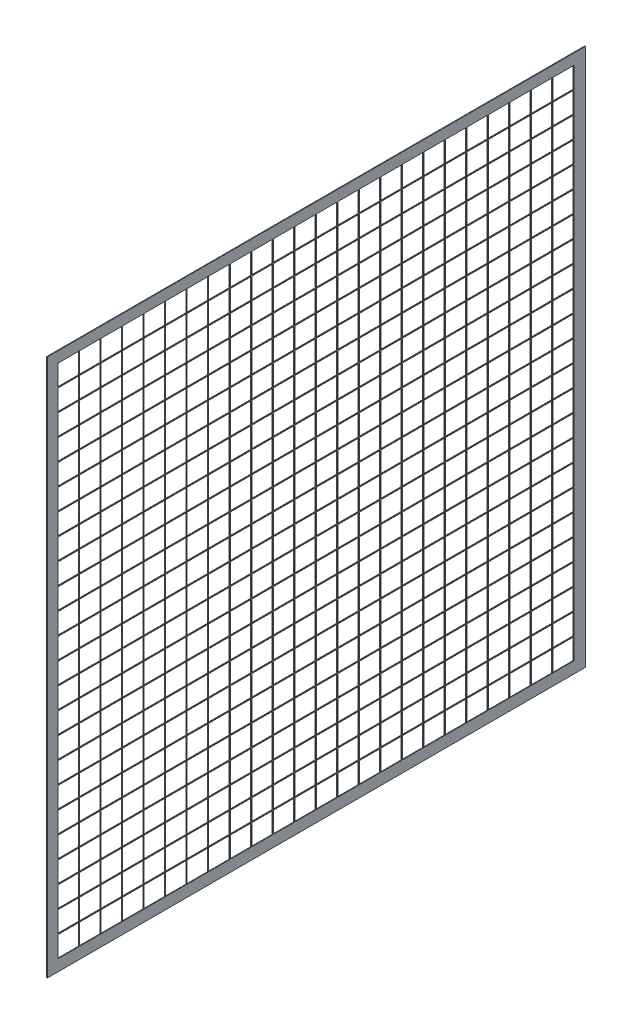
SolidWorks part; units mm, degrees
ref_plane "Front Plane" through (0, 0, 0) normal (1, 0, 0) x (0, 1, 0)
ref_plane "Top Plane" through (0, 0, 0) normal (0, 0, 1) x (0, 1, 0)
ref_plane "Right Plane" through (0, 0, 0) normal (0, 1, 0) x (-1, 0, 0)
sketch "Sketch1" plane through (0, 0, 0) normal (1, 0, 0) x (0, 1, 0)
  line L0 (-150, -150) -> (150, -150)
  line L1 (150, -150) -> (150, 150)
  line L2 (150, 150) -> (-150, 150)
  line L3 (-150, 150) -> (-150, -150)
  line L4 (-143.65, -143.65) -> (-132, -143.65)
  line L5 (-132, -143.65) -> (-132, -132)
  line L6 (-132, -132) -> (-143.65, -132)
  line L7 (-143.65, -132) -> (-143.65, -143.65)
  line L8 (-143.65, -131.65) -> (-132, -131.65)
  line L9 (-132, -131.65) -> (-132, -120)
  line L10 (-132, -120) -> (-143.65, -120)
  line L11 (-143.65, -120) -> (-143.65, -131.65)
  line L12 (-143.65, -119.65) -> (-132, -119.65)
  line L13 (-132, -119.65) -> (-132, -108)
  line L14 (-132, -108) -> (-143.65, -108)
  line L15 (-143.65, -108) -> (-143.65, -119.65)
  line L16 (-143.65, -107.65) -> (-132, -107.65)
  line L17 (-132, -107.65) -> (-132, -96)
  line L18 (-132, -96) -> (-143.65, -96)
  line L19 (-143.65, -96) -> (-143.65, -107.65)
  line L20 (-143.65, -95.65) -> (-132, -95.65)
  line L21 (-132, -95.65) -> (-132, -84)
  line L22 (-132, -84) -> (-143.65, -84)
  line L23 (-143.65, -84) -> (-143.65, -95.65)
  line L24 (-143.65, -83.65) -> (-132, -83.65)
  line L25 (-132, -83.65) -> (-132, -72)
  line L26 (-132, -72) -> (-143.65, -72)
  line L27 (-143.65, -72) -> (-143.65, -83.65)
  line L28 (-143.65, -71.65) -> (-132, -71.65)
  line L29 (-132, -71.65) -> (-132, -60)
  line L30 (-132, -60) -> (-143.65, -60)
  line L31 (-143.65, -60) -> (-143.65, -71.65)
  line L32 (-143.65, -59.65) -> (-132, -59.65)
  line L33 (-132, -59.65) -> (-132, -48)
  line L34 (-132, -48) -> (-143.65, -48)
  line L35 (-143.65, -48) -> (-143.65, -59.65)
  line L36 (-143.65, -47.65) -> (-132, -47.65)
  line L37 (-132, -47.65) -> (-132, -36)
  line L38 (-132, -36) -> (-143.65, -36)
  line L39 (-143.65, -36) -> (-143.65, -47.65)
  line L40 (-143.65, -35.65) -> (-132, -35.65)
  line L41 (-132, -35.65) -> (-132, -24)
  line L42 (-132, -24) -> (-143.65, -24)
  line L43 (-143.65, -24) -> (-143.65, -35.65)
  line L44 (-143.65, -23.65) -> (-132, -23.65)
  line L45 (-132, -23.65) -> (-132, -12)
  line L46 (-132, -12) -> (-143.65, -12)
  line L47 (-143.65, -12) -> (-143.65, -23.65)
  line L48 (-143.65, -11.65) -> (-132, -11.65)
  line L49 (-132, -11.65) -> (-132, 0)
  line L50 (-132, 0) -> (-143.65, 0)
  line L51 (-143.65, 0) -> (-143.65, -11.65)
  line L52 (-143.65, 0.35) -> (-132, 0.35)
  line L53 (-132, 0.35) -> (-132, 12)
  line L54 (-132, 12) -> (-143.65, 12)
  line L55 (-143.65, 12) -> (-143.65, 0.35)
  line L56 (-143.65, 12.35) -> (-132, 12.35)
  line L57 (-132, 12.35) -> (-132, 24)
  line L58 (-132, 24) -> (-143.65, 24)
  line L59 (-143.65, 24) -> (-143.65, 12.35)
  line L60 (-143.65, 24.35) -> (-132, 24.35)
  line L61 (-132, 24.35) -> (-132, 36)
  line L62 (-132, 36) -> (-143.65, 36)
  line L63 (-143.65, 36) -> (-143.65, 24.35)
  line L64 (-143.65, 36.35) -> (-132, 36.35)
  line L65 (-132, 36.35) -> (-132, 48)
  line L66 (-132, 48) -> (-143.65, 48)
  line L67 (-143.65, 48) -> (-143.65, 36.35)
  line L68 (-143.65, 48.35) -> (-132, 48.35)
  line L69 (-132, 48.35) -> (-132, 60)
  line L70 (-132, 60) -> (-143.65, 60)
  line L71 (-143.65, 60) -> (-143.65, 48.35)
  line L72 (-143.65, 60.35) -> (-132, 60.35)
  line L73 (-132, 60.35) -> (-132, 72)
  line L74 (-132, 72) -> (-143.65, 72)
  line L75 (-143.65, 72) -> (-143.65, 60.35)
  line L76 (-143.65, 72.35) -> (-132, 72.35)
  line L77 (-132, 72.35) -> (-132, 84)
  line L78 (-132, 84) -> (-143.65, 84)
  line L79 (-143.65, 84) -> (-143.65, 72.35)
  line L80 (-143.65, 84.35) -> (-132, 84.35)
  line L81 (-132, 84.35) -> (-132, 96)
  line L82 (-132, 96) -> (-143.65, 96)
  line L83 (-143.65, 96) -> (-143.65, 84.35)
  line L84 (-143.65, 96.35) -> (-132, 96.35)
  line L85 (-132, 96.35) -> (-132, 108)
  line L86 (-132, 108) -> (-143.65, 108)
  line L87 (-143.65, 108) -> (-143.65, 96.35)
  line L88 (-143.65, 108.35) -> (-132, 108.35)
  line L89 (-132, 108.35) -> (-132, 120)
  line L90 (-132, 120) -> (-143.65, 120)
  line L91 (-143.65, 120) -> (-143.65, 108.35)
  line L92 (-143.65, 120.35) -> (-132, 120.35)
  line L93 (-132, 120.35) -> (-132, 132)
  line L94 (-132, 132) -> (-143.65, 132)
  line L95 (-143.65, 132) -> (-143.65, 120.35)
  line L96 (-143.65, 132.35) -> (-132, 132.35)
  line L97 (-132, 132.35) -> (-132, 144)
  line L98 (-132, 144) -> (-143.65, 144)
  line L99 (-143.65, 144) -> (-143.65, 132.35)
  line L100 (-131.65, -143.65) -> (-120, -143.65)
  line L101 (-120, -143.65) -> (-120, -132)
  line L102 (-120, -132) -> (-131.65, -132)
  line L103 (-131.65, -132) -> (-131.65, -143.65)
  line L104 (-131.65, -131.65) -> (-120, -131.65)
  line L105 (-120, -131.65) -> (-120, -120)
  line L106 (-120, -120) -> (-131.65, -120)
  line L107 (-131.65, -120) -> (-131.65, -131.65)
  line L108 (-131.65, -119.65) -> (-120, -119.65)
  line L109 (-120, -119.65) -> (-120, -108)
  line L110 (-120, -108) -> (-131.65, -108)
  line L111 (-131.65, -108) -> (-131.65, -119.65)
  line L112 (-131.65, -107.65) -> (-120, -107.65)
  line L113 (-120, -107.65) -> (-120, -96)
  line L114 (-120, -96) -> (-131.65, -96)
  line L115 (-131.65, -96) -> (-131.65, -107.65)
  line L116 (-131.65, -95.65) -> (-120, -95.65)
  line L117 (-120, -95.65) -> (-120, -84)
  line L118 (-120, -84) -> (-131.65, -84)
  line L119 (-131.65, -84) -> (-131.65, -95.65)
  line L120 (-131.65, -83.65) -> (-120, -83.65)
  line L121 (-120, -83.65) -> (-120, -72)
  line L122 (-120, -72) -> (-131.65, -72)
  line L123 (-131.65, -72) -> (-131.65, -83.65)
  line L124 (-131.65, -71.65) -> (-120, -71.65)
  line L125 (-120, -71.65) -> (-120, -60)
  line L126 (-120, -60) -> (-131.65, -60)
  line L127 (-131.65, -60) -> (-131.65, -71.65)
  line L128 (-131.65, -59.65) -> (-120, -59.65)
  line L129 (-120, -59.65) -> (-120, -48)
  line L130 (-120, -48) -> (-131.65, -48)
  line L131 (-131.65, -48) -> (-131.65, -59.65)
  line L132 (-131.65, -47.65) -> (-120, -47.65)
  line L133 (-120, -47.65) -> (-120, -36)
  line L134 (-120, -36) -> (-131.65, -36)
  line L135 (-131.65, -36) -> (-131.65, -47.65)
  line L136 (-131.65, -35.65) -> (-120, -35.65)
  line L137 (-120, -35.65) -> (-120, -24)
  line L138 (-120, -24) -> (-131.65, -24)
  line L139 (-131.65, -24) -> (-131.65, -35.65)
  line L140 (-131.65, -23.65) -> (-120, -23.65)
  line L141 (-120, -23.65) -> (-120, -12)
  line L142 (-120, -12) -> (-131.65, -12)
  line L143 (-131.65, -12) -> (-131.65, -23.65)
  line L144 (-131.65, -11.65) -> (-120, -11.65)
  line L145 (-120, -11.65) -> (-120, 0)
  line L146 (-120, 0) -> (-131.65, 0)
  line L147 (-131.65, 0) -> (-131.65, -11.65)
  line L148 (-131.65, 0.35) -> (-120, 0.35)
  line L149 (-120, 0.35) -> (-120, 12)
  line L150 (-120, 12) -> (-131.65, 12)
  line L151 (-131.65, 12) -> (-131.65, 0.35)
  line L152 (-131.65, 12.35) -> (-120, 12.35)
  line L153 (-120, 12.35) -> (-120, 24)
  line L154 (-120, 24) -> (-131.65, 24)
  line L155 (-131.65, 24) -> (-131.65, 12.35)
  line L156 (-131.65, 24.35) -> (-120, 24.35)
  line L157 (-120, 24.35) -> (-120, 36)
  line L158 (-120, 36) -> (-131.65, 36)
  line L159 (-131.65, 36) -> (-131.65, 24.35)
  line L160 (-131.65, 36.35) -> (-120, 36.35)
  line L161 (-120, 36.35) -> (-120, 48)
  line L162 (-120, 48) -> (-131.65, 48)
  line L163 (-131.65, 48) -> (-131.65, 36.35)
  line L164 (-131.65, 48.35) -> (-120, 48.35)
  line L165 (-120, 48.35) -> (-120, 60)
  line L166 (-120, 60) -> (-131.65, 60)
  line L167 (-131.65, 60) -> (-131.65, 48.35)
  line L168 (-131.65, 60.35) -> (-120, 60.35)
  line L169 (-120, 60.35) -> (-120, 72)
  line L170 (-120, 72) -> (-131.65, 72)
  line L171 (-131.65, 72) -> (-131.65, 60.35)
  line L172 (-131.65, 72.35) -> (-120, 72.35)
  line L173 (-120, 72.35) -> (-120, 84)
  line L174 (-120, 84) -> (-131.65, 84)
  line L175 (-131.65, 84) -> (-131.65, 72.35)
  line L176 (-131.65, 84.35) -> (-120, 84.35)
  line L177 (-120, 84.35) -> (-120, 96)
  line L178 (-120, 96) -> (-131.65, 96)
  line L179 (-131.65, 96) -> (-131.65, 84.35)
  line L180 (-131.65, 96.35) -> (-120, 96.35)
  line L181 (-120, 96.35) -> (-120, 108)
  line L182 (-120, 108) -> (-131.65, 108)
  line L183 (-131.65, 108) -> (-131.65, 96.35)
  line L184 (-131.65, 108.35) -> (-120, 108.35)
  line L185 (-120, 108.35) -> (-120, 120)
  line L186 (-120, 120) -> (-131.65, 120)
  line L187 (-131.65, 120) -> (-131.65, 108.35)
  line L188 (-131.65, 120.35) -> (-120, 120.35)
  line L189 (-120, 120.35) -> (-120, 132)
  line L190 (-120, 132) -> (-131.65, 132)
  line L191 (-131.65, 132) -> (-131.65, 120.35)
  line L192 (-131.65, 132.35) -> (-120, 132.35)
  line L193 (-120, 132.35) -> (-120, 144)
  line L194 (-120, 144) -> (-131.65, 144)
  line L195 (-131.65, 144) -> (-131.65, 132.35)
  line L196 (-119.65, -143.65) -> (-108, -143.65)
  line L197 (-108, -143.65) -> (-108, -132)
  line L198 (-108, -132) -> (-119.65, -132)
  line L199 (-119.65, -132) -> (-119.65, -143.65)
  line L200 (-119.65, -131.65) -> (-108, -131.65)
  line L201 (-108, -131.65) -> (-108, -120)
  line L202 (-108, -120) -> (-119.65, -120)
  line L203 (-119.65, -120) -> (-119.65, -131.65)
  line L204 (-119.65, -119.65) -> (-108, -119.65)
  line L205 (-108, -119.65) -> (-108, -108)
  line L206 (-108, -108) -> (-119.65, -108)
  line L207 (-119.65, -108) -> (-119.65, -119.65)
  line L208 (-119.65, -107.65) -> (-108, -107.65)
  line L209 (-108, -107.65) -> (-108, -96)
  line L210 (-108, -96) -> (-119.65, -96)
  line L211 (-119.65, -96) -> (-119.65, -107.65)
  line L212 (-119.65, -95.65) -> (-108, -95.65)
  line L213 (-108, -95.65) -> (-108, -84)
  line L214 (-108, -84) -> (-119.65, -84)
  line L215 (-119.65, -84) -> (-119.65, -95.65)
  line L216 (-119.65, -83.65) -> (-108, -83.65)
  line L217 (-108, -83.65) -> (-108, -72)
  line L218 (-108, -72) -> (-119.65, -72)
  line L219 (-119.65, -72) -> (-119.65, -83.65)
  line L220 (-119.65, -71.65) -> (-108, -71.65)
  line L221 (-108, -71.65) -> (-108, -60)
  line L222 (-108, -60) -> (-119.65, -60)
  line L223 (-119.65, -60) -> (-119.65, -71.65)
  line L224 (-119.65, -59.65) -> (-108, -59.65)
  line L225 (-108, -59.65) -> (-108, -48)
  line L226 (-108, -48) -> (-119.65, -48)
  line L227 (-119.65, -48) -> (-119.65, -59.65)
  line L228 (-119.65, -47.65) -> (-108, -47.65)
  line L229 (-108, -47.65) -> (-108, -36)
  line L230 (-108, -36) -> (-119.65, -36)
  line L231 (-119.65, -36) -> (-119.65, -47.65)
  line L232 (-119.65, -35.65) -> (-108, -35.65)
  line L233 (-108, -35.65) -> (-108, -24)
  line L234 (-108, -24) -> (-119.65, -24)
  line L235 (-119.65, -24) -> (-119.65, -35.65)
  line L236 (-119.65, -23.65) -> (-108, -23.65)
  line L237 (-108, -23.65) -> (-108, -12)
  line L238 (-108, -12) -> (-119.65, -12)
  line L239 (-119.65, -12) -> (-119.65, -23.65)
  line L240 (-119.65, -11.65) -> (-108, -11.65)
  line L241 (-108, -11.65) -> (-108, 0)
  line L242 (-108, 0) -> (-119.65, 0)
  line L243 (-119.65, 0) -> (-119.65, -11.65)
  line L244 (-119.65, 0.35) -> (-108, 0.35)
  line L245 (-108, 0.35) -> (-108, 12)
  line L246 (-108, 12) -> (-119.65, 12)
  line L247 (-119.65, 12) -> (-119.65, 0.35)
  line L248 (-119.65, 12.35) -> (-108, 12.35)
  line L249 (-108, 12.35) -> (-108, 24)
  line L250 (-108, 24) -> (-119.65, 24)
  line L251 (-119.65, 24) -> (-119.65, 12.35)
  line L252 (-119.65, 24.35) -> (-108, 24.35)
  line L253 (-108, 24.35) -> (-108, 36)
  line L254 (-108, 36) -> (-119.65, 36)
  line L255 (-119.65, 36) -> (-119.65, 24.35)
  line L256 (-119.65, 36.35) -> (-108, 36.35)
  line L257 (-108, 36.35) -> (-108, 48)
  line L258 (-108, 48) -> (-119.65, 48)
  line L259 (-119.65, 48) -> (-119.65, 36.35)
  line L260 (-119.65, 48.35) -> (-108, 48.35)
  line L261 (-108, 48.35) -> (-108, 60)
  line L262 (-108, 60) -> (-119.65, 60)
  line L263 (-119.65, 60) -> (-119.65, 48.35)
  line L264 (-119.65, 60.35) -> (-108, 60.35)
  line L265 (-108, 60.35) -> (-108, 72)
  line L266 (-108, 72) -> (-119.65, 72)
  line L267 (-119.65, 72) -> (-119.65, 60.35)
  line L268 (-119.65, 72.35) -> (-108, 72.35)
  line L269 (-108, 72.35) -> (-108, 84)
  line L270 (-108, 84) -> (-119.65, 84)
  line L271 (-119.65, 84) -> (-119.65, 72.35)
  line L272 (-119.65, 84.35) -> (-108, 84.35)
  line L273 (-108, 84.35) -> (-108, 96)
  line L274 (-108, 96) -> (-119.65, 96)
  line L275 (-119.65, 96) -> (-119.65, 84.35)
  line L276 (-119.65, 96.35) -> (-108, 96.35)
  line L277 (-108, 96.35) -> (-108, 108)
  line L278 (-108, 108) -> (-119.65, 108)
  line L279 (-119.65, 108) -> (-119.65, 96.35)
  line L280 (-119.65, 108.35) -> (-108, 108.35)
  line L281 (-108, 108.35) -> (-108, 120)
  line L282 (-108, 120) -> (-119.65, 120)
  line L283 (-119.65, 120) -> (-119.65, 108.35)
  line L284 (-119.65, 120.35) -> (-108, 120.35)
  line L285 (-108, 120.35) -> (-108, 132)
  line L286 (-108, 132) -> (-119.65, 132)
  line L287 (-119.65, 132) -> (-119.65, 120.35)
  line L288 (-119.65, 132.35) -> (-108, 132.35)
  line L289 (-108, 132.35) -> (-108, 144)
  line L290 (-108, 144) -> (-119.65, 144)
  line L291 (-119.65, 144) -> (-119.65, 132.35)
  line L292 (-107.65, -143.65) -> (-96, -143.65)
  line L293 (-96, -143.65) -> (-96, -132)
  line L294 (-96, -132) -> (-107.65, -132)
  line L295 (-107.65, -132) -> (-107.65, -143.65)
  line L296 (-107.65, -131.65) -> (-96, -131.65)
  line L297 (-96, -131.65) -> (-96, -120)
  line L298 (-96, -120) -> (-107.65, -120)
  line L299 (-107.65, -120) -> (-107.65, -131.65)
  line L300 (-107.65, -119.65) -> (-96, -119.65)
  line L301 (-96, -119.65) -> (-96, -108)
  line L302 (-96, -108) -> (-107.65, -108)
  line L303 (-107.65, -108) -> (-107.65, -119.65)
  line L304 (-107.65, -107.65) -> (-96, -107.65)
  line L305 (-96, -107.65) -> (-96, -96)
  line L306 (-96, -96) -> (-107.65, -96)
  line L307 (-107.65, -96) -> (-107.65, -107.65)
  line L308 (-107.65, -95.65) -> (-96, -95.65)
  line L309 (-96, -95.65) -> (-96, -84)
  line L310 (-96, -84) -> (-107.65, -84)
  line L311 (-107.65, -84) -> (-107.65, -95.65)
  line L312 (-107.65, -83.65) -> (-96, -83.65)
  line L313 (-96, -83.65) -> (-96, -72)
  line L314 (-96, -72) -> (-107.65, -72)
  line L315 (-107.65, -72) -> (-107.65, -83.65)
  line L316 (-107.65, -71.65) -> (-96, -71.65)
  line L317 (-96, -71.65) -> (-96, -60)
  line L318 (-96, -60) -> (-107.65, -60)
  line L319 (-107.65, -60) -> (-107.65, -71.65)
  line L320 (-107.65, -59.65) -> (-96, -59.65)
  line L321 (-96, -59.65) -> (-96, -48)
  line L322 (-96, -48) -> (-107.65, -48)
  line L323 (-107.65, -48) -> (-107.65, -59.65)
  line L324 (-107.65, -47.65) -> (-96, -47.65)
  line L325 (-96, -47.65) -> (-96, -36)
  line L326 (-96, -36) -> (-107.65, -36)
  line L327 (-107.65, -36) -> (-107.65, -47.65)
  line L328 (-107.65, -35.65) -> (-96, -35.65)
  line L329 (-96, -35.65) -> (-96, -24)
  line L330 (-96, -24) -> (-107.65, -24)
  line L331 (-107.65, -24) -> (-107.65, -35.65)
  line L332 (-107.65, -23.65) -> (-96, -23.65)
  line L333 (-96, -23.65) -> (-96, -12)
  line L334 (-96, -12) -> (-107.65, -12)
  line L335 (-107.65, -12) -> (-107.65, -23.65)
  line L336 (-107.65, -11.65) -> (-96, -11.65)
  line L337 (-96, -11.65) -> (-96, 0)
  line L338 (-96, 0) -> (-107.65, 0)
  line L339 (-107.65, 0) -> (-107.65, -11.65)
  line L340 (-107.65, 0.35) -> (-96, 0.35)
  line L341 (-96, 0.35) -> (-96, 12)
  line L342 (-96, 12) -> (-107.65, 12)
  line L343 (-107.65, 12) -> (-107.65, 0.35)
  line L344 (-107.65, 12.35) -> (-96, 12.35)
  line L345 (-96, 12.35) -> (-96, 24)
  line L346 (-96, 24) -> (-107.65, 24)
  line L347 (-107.65, 24) -> (-107.65, 12.35)
  line L348 (-107.65, 24.35) -> (-96, 24.35)
  line L349 (-96, 24.35) -> (-96, 36)
  line L350 (-96, 36) -> (-107.65, 36)
  line L351 (-107.65, 36) -> (-107.65, 24.35)
  line L352 (-107.65, 36.35) -> (-96, 36.35)
  line L353 (-96, 36.35) -> (-96, 48)
  line L354 (-96, 48) -> (-107.65, 48)
  line L355 (-107.65, 48) -> (-107.65, 36.35)
  line L356 (-107.65, 48.35) -> (-96, 48.35)
  line L357 (-96, 48.35) -> (-96, 60)
  line L358 (-96, 60) -> (-107.65, 60)
  line L359 (-107.65, 60) -> (-107.65, 48.35)
  line L360 (-107.65, 60.35) -> (-96, 60.35)
  line L361 (-96, 60.35) -> (-96, 72)
  line L362 (-96, 72) -> (-107.65, 72)
  line L363 (-107.65, 72) -> (-107.65, 60.35)
  line L364 (-107.65, 72.35) -> (-96, 72.35)
  line L365 (-96, 72.35) -> (-96, 84)
  line L366 (-96, 84) -> (-107.65, 84)
  line L367 (-107.65, 84) -> (-107.65, 72.35)
  line L368 (-107.65, 84.35) -> (-96, 84.35)
  line L369 (-96, 84.35) -> (-96, 96)
  line L370 (-96, 96) -> (-107.65, 96)
  line L371 (-107.65, 96) -> (-107.65, 84.35)
  line L372 (-107.65, 96.35) -> (-96, 96.35)
  line L373 (-96, 96.35) -> (-96, 108)
  line L374 (-96, 108) -> (-107.65, 108)
  line L375 (-107.65, 108) -> (-107.65, 96.35)
  line L376 (-107.65, 108.35) -> (-96, 108.35)
  line L377 (-96, 108.35) -> (-96, 120)
  line L378 (-96, 120) -> (-107.65, 120)
  line L379 (-107.65, 120) -> (-107.65, 108.35)
  line L380 (-107.65, 120.35) -> (-96, 120.35)
  line L381 (-96, 120.35) -> (-96, 132)
  line L382 (-96, 132) -> (-107.65, 132)
  line L383 (-107.65, 132) -> (-107.65, 120.35)
  line L384 (-107.65, 132.35) -> (-96, 132.35)
  line L385 (-96, 132.35) -> (-96, 144)
  line L386 (-96, 144) -> (-107.65, 144)
  line L387 (-107.65, 144) -> (-107.65, 132.35)
  line L388 (-95.65, -143.65) -> (-84, -143.65)
  line L389 (-84, -143.65) -> (-84, -132)
  line L390 (-84, -132) -> (-95.65, -132)
  line L391 (-95.65, -132) -> (-95.65, -143.65)
  line L392 (-95.65, -131.65) -> (-84, -131.65)
  line L393 (-84, -131.65) -> (-84, -120)
  line L394 (-84, -120) -> (-95.65, -120)
  line L395 (-95.65, -120) -> (-95.65, -131.65)
  line L396 (-95.65, -119.65) -> (-84, -119.65)
  line L397 (-84, -119.65) -> (-84, -108)
  line L398 (-84, -108) -> (-95.65, -108)
  line L399 (-95.65, -108) -> (-95.65, -119.65)
  line L400 (-95.65, -107.65) -> (-84, -107.65)
  line L401 (-84, -107.65) -> (-84, -96)
  line L402 (-84, -96) -> (-95.65, -96)
  line L403 (-95.65, -96) -> (-95.65, -107.65)
  line L404 (-95.65, -95.65) -> (-84, -95.65)
  line L405 (-84, -95.65) -> (-84, -84)
  line L406 (-84, -84) -> (-95.65, -84)
  line L407 (-95.65, -84) -> (-95.65, -95.65)
  line L408 (-95.65, -83.65) -> (-84, -83.65)
  line L409 (-84, -83.65) -> (-84, -72)
  line L410 (-84, -72) -> (-95.65, -72)
  line L411 (-95.65, -72) -> (-95.65, -83.65)
  line L412 (-95.65, -71.65) -> (-84, -71.65)
  line L413 (-84, -71.65) -> (-84, -60)
  line L414 (-84, -60) -> (-95.65, -60)
  line L415 (-95.65, -60) -> (-95.65, -71.65)
  line L416 (-95.65, -59.65) -> (-84, -59.65)
  line L417 (-84, -59.65) -> (-84, -48)
  line L418 (-84, -48) -> (-95.65, -48)
  line L419 (-95.65, -48) -> (-95.65, -59.65)
  line L420 (-95.65, -47.65) -> (-84, -47.65)
  line L421 (-84, -47.65) -> (-84, -36)
  line L422 (-84, -36) -> (-95.65, -36)
  line L423 (-95.65, -36) -> (-95.65, -47.65)
  line L424 (-95.65, -35.65) -> (-84, -35.65)
  line L425 (-84, -35.65) -> (-84, -24)
  line L426 (-84, -24) -> (-95.65, -24)
  line L427 (-95.65, -24) -> (-95.65, -35.65)
  line L428 (-95.65, -23.65) -> (-84, -23.65)
  line L429 (-84, -23.65) -> (-84, -12)
  line L430 (-84, -12) -> (-95.65, -12)
  line L431 (-95.65, -12) -> (-95.65, -23.65)
  line L432 (-95.65, -11.65) -> (-84, -11.65)
  line L433 (-84, -11.65) -> (-84, 0)
  line L434 (-84, 0) -> (-95.65, 0)
  line L435 (-95.65, 0) -> (-95.65, -11.65)
  line L436 (-95.65, 0.35) -> (-84, 0.35)
  line L437 (-84, 0.35) -> (-84, 12)
  line L438 (-84, 12) -> (-95.65, 12)
  line L439 (-95.65, 12) -> (-95.65, 0.35)
  line L440 (-95.65, 12.35) -> (-84, 12.35)
  line L441 (-84, 12.35) -> (-84, 24)
  line L442 (-84, 24) -> (-95.65, 24)
  line L443 (-95.65, 24) -> (-95.65, 12.35)
  line L444 (-95.65, 24.35) -> (-84, 24.35)
  line L445 (-84, 24.35) -> (-84, 36)
  line L446 (-84, 36) -> (-95.65, 36)
  line L447 (-95.65, 36) -> (-95.65, 24.35)
  line L448 (-95.65, 36.35) -> (-84, 36.35)
  line L449 (-84, 36.35) -> (-84, 48)
  line L450 (-84, 48) -> (-95.65, 48)
  line L451 (-95.65, 48) -> (-95.65, 36.35)
  line L452 (-95.65, 48.35) -> (-84, 48.35)
  line L453 (-84, 48.35) -> (-84, 60)
  line L454 (-84, 60) -> (-95.65, 60)
  line L455 (-95.65, 60) -> (-95.65, 48.35)
  line L456 (-95.65, 60.35) -> (-84, 60.35)
  line L457 (-84, 60.35) -> (-84, 72)
  line L458 (-84, 72) -> (-95.65, 72)
  line L459 (-95.65, 72) -> (-95.65, 60.35)
  line L460 (-95.65, 72.35) -> (-84, 72.35)
  line L461 (-84, 72.35) -> (-84, 84)
  line L462 (-84, 84) -> (-95.65, 84)
  line L463 (-95.65, 84) -> (-95.65, 72.35)
  line L464 (-95.65, 84.35) -> (-84, 84.35)
  line L465 (-84, 84.35) -> (-84, 96)
  line L466 (-84, 96) -> (-95.65, 96)
  line L467 (-95.65, 96) -> (-95.65, 84.35)
  line L468 (-95.65, 96.35) -> (-84, 96.35)
  line L469 (-84, 96.35) -> (-84, 108)
  line L470 (-84, 108) -> (-95.65, 108)
  line L471 (-95.65, 108) -> (-95.65, 96.35)
  line L472 (-95.65, 108.35) -> (-84, 108.35)
  line L473 (-84, 108.35) -> (-84, 120)
  line L474 (-84, 120) -> (-95.65, 120)
  line L475 (-95.65, 120) -> (-95.65, 108.35)
  line L476 (-95.65, 120.35) -> (-84, 120.35)
  line L477 (-84, 120.35) -> (-84, 132)
  line L478 (-84, 132) -> (-95.65, 132)
  line L479 (-95.65, 132) -> (-95.65, 120.35)
  line L480 (-95.65, 132.35) -> (-84, 132.35)
  line L481 (-84, 132.35) -> (-84, 144)
  line L482 (-84, 144) -> (-95.65, 144)
  line L483 (-95.65, 144) -> (-95.65, 132.35)
  line L484 (-83.65, -143.65) -> (-72, -143.65)
  line L485 (-72, -143.65) -> (-72, -132)
  line L486 (-72, -132) -> (-83.65, -132)
  line L487 (-83.65, -132) -> (-83.65, -143.65)
  line L488 (-83.65, -131.65) -> (-72, -131.65)
  line L489 (-72, -131.65) -> (-72, -120)
  line L490 (-72, -120) -> (-83.65, -120)
  line L491 (-83.65, -120) -> (-83.65, -131.65)
  line L492 (-83.65, -119.65) -> (-72, -119.65)
  line L493 (-72, -119.65) -> (-72, -108)
  line L494 (-72, -108) -> (-83.65, -108)
  line L495 (-83.65, -108) -> (-83.65, -119.65)
  line L496 (-83.65, -107.65) -> (-72, -107.65)
  line L497 (-72, -107.65) -> (-72, -96)
  line L498 (-72, -96) -> (-83.65, -96)
  line L499 (-83.65, -96) -> (-83.65, -107.65)
  line L500 (-83.65, -95.65) -> (-72, -95.65)
  line L501 (-72, -95.65) -> (-72, -84)
  line L502 (-72, -84) -> (-83.65, -84)
  line L503 (-83.65, -84) -> (-83.65, -95.65)
  line L504 (-83.65, -83.65) -> (-72, -83.65)
  line L505 (-72, -83.65) -> (-72, -72)
  line L506 (-72, -72) -> (-83.65, -72)
  line L507 (-83.65, -72) -> (-83.65, -83.65)
  line L508 (-83.65, -71.65) -> (-72, -71.65)
  line L509 (-72, -71.65) -> (-72, -60)
  line L510 (-72, -60) -> (-83.65, -60)
  line L511 (-83.65, -60) -> (-83.65, -71.65)
  line L512 (-83.65, -59.65) -> (-72, -59.65)
  line L513 (-72, -59.65) -> (-72, -48)
  line L514 (-72, -48) -> (-83.65, -48)
  line L515 (-83.65, -48) -> (-83.65, -59.65)
  line L516 (-83.65, -47.65) -> (-72, -47.65)
  line L517 (-72, -47.65) -> (-72, -36)
  line L518 (-72, -36) -> (-83.65, -36)
  line L519 (-83.65, -36) -> (-83.65, -47.65)
  line L520 (-83.65, -35.65) -> (-72, -35.65)
  line L521 (-72, -35.65) -> (-72, -24)
  line L522 (-72, -24) -> (-83.65, -24)
  line L523 (-83.65, -24) -> (-83.65, -35.65)
  line L524 (-83.65, -23.65) -> (-72, -23.65)
  line L525 (-72, -23.65) -> (-72, -12)
  line L526 (-72, -12) -> (-83.65, -12)
  line L527 (-83.65, -12) -> (-83.65, -23.65)
  line L528 (-83.65, -11.65) -> (-72, -11.65)
  line L529 (-72, -11.65) -> (-72, 0)
  line L530 (-72, 0) -> (-83.65, 0)
  line L531 (-83.65, 0) -> (-83.65, -11.65)
  line L532 (-83.65, 0.35) -> (-72, 0.35)
  line L533 (-72, 0.35) -> (-72, 12)
  line L534 (-72, 12) -> (-83.65, 12)
  line L535 (-83.65, 12) -> (-83.65, 0.35)
  line L536 (-83.65, 12.35) -> (-72, 12.35)
  line L537 (-72, 12.35) -> (-72, 24)
  line L538 (-72, 24) -> (-83.65, 24)
  line L539 (-83.65, 24) -> (-83.65, 12.35)
  line L540 (-83.65, 24.35) -> (-72, 24.35)
  line L541 (-72, 24.35) -> (-72, 36)
  line L542 (-72, 36) -> (-83.65, 36)
  line L543 (-83.65, 36) -> (-83.65, 24.35)
  line L544 (-83.65, 36.35) -> (-72, 36.35)
  line L545 (-72, 36.35) -> (-72, 48)
  line L546 (-72, 48) -> (-83.65, 48)
  line L547 (-83.65, 48) -> (-83.65, 36.35)
  line L548 (-83.65, 48.35) -> (-72, 48.35)
  line L549 (-72, 48.35) -> (-72, 60)
  line L550 (-72, 60) -> (-83.65, 60)
  line L551 (-83.65, 60) -> (-83.65, 48.35)
  line L552 (-83.65, 60.35) -> (-72, 60.35)
  line L553 (-72, 60.35) -> (-72, 72)
  line L554 (-72, 72) -> (-83.65, 72)
  line L555 (-83.65, 72) -> (-83.65, 60.35)
  line L556 (-83.65, 72.35) -> (-72, 72.35)
  line L557 (-72, 72.35) -> (-72, 84)
  line L558 (-72, 84) -> (-83.65, 84)
  line L559 (-83.65, 84) -> (-83.65, 72.35)
  line L560 (-83.65, 84.35) -> (-72, 84.35)
  line L561 (-72, 84.35) -> (-72, 96)
  line L562 (-72, 96) -> (-83.65, 96)
  line L563 (-83.65, 96) -> (-83.65, 84.35)
  line L564 (-83.65, 96.35) -> (-72, 96.35)
  line L565 (-72, 96.35) -> (-72, 108)
  line L566 (-72, 108) -> (-83.65, 108)
  line L567 (-83.65, 108) -> (-83.65, 96.35)
  line L568 (-83.65, 108.35) -> (-72, 108.35)
  line L569 (-72, 108.35) -> (-72, 120)
  line L570 (-72, 120) -> (-83.65, 120)
  line L571 (-83.65, 120) -> (-83.65, 108.35)
  line L572 (-83.65, 120.35) -> (-72, 120.35)
  line L573 (-72, 120.35) -> (-72, 132)
  line L574 (-72, 132) -> (-83.65, 132)
  line L575 (-83.65, 132) -> (-83.65, 120.35)
  line L576 (-83.65, 132.35) -> (-72, 132.35)
  line L577 (-72, 132.35) -> (-72, 144)
  line L578 (-72, 144) -> (-83.65, 144)
  line L579 (-83.65, 144) -> (-83.65, 132.35)
  line L580 (-71.65, -143.65) -> (-60, -143.65)
  line L581 (-60, -143.65) -> (-60, -132)
  line L582 (-60, -132) -> (-71.65, -132)
  line L583 (-71.65, -132) -> (-71.65, -143.65)
  line L584 (-71.65, -131.65) -> (-60, -131.65)
  line L585 (-60, -131.65) -> (-60, -120)
  line L586 (-60, -120) -> (-71.65, -120)
  line L587 (-71.65, -120) -> (-71.65, -131.65)
  line L588 (-71.65, -119.65) -> (-60, -119.65)
  line L589 (-60, -119.65) -> (-60, -108)
  line L590 (-60, -108) -> (-71.65, -108)
  line L591 (-71.65, -108) -> (-71.65, -119.65)
  line L592 (-71.65, -107.65) -> (-60, -107.65)
  line L593 (-60, -107.65) -> (-60, -96)
  line L594 (-60, -96) -> (-71.65, -96)
  line L595 (-71.65, -96) -> (-71.65, -107.65)
  line L596 (-71.65, -95.65) -> (-60, -95.65)
  line L597 (-60, -95.65) -> (-60, -84)
  line L598 (-60, -84) -> (-71.65, -84)
  line L599 (-71.65, -84) -> (-71.65, -95.65)
  line L600 (-71.65, -83.65) -> (-60, -83.65)
  line L601 (-60, -83.65) -> (-60, -72)
  line L602 (-60, -72) -> (-71.65, -72)
  line L603 (-71.65, -72) -> (-71.65, -83.65)
  line L604 (-71.65, -71.65) -> (-60, -71.65)
  line L605 (-60, -71.65) -> (-60, -60)
  line L606 (-60, -60) -> (-71.65, -60)
  line L607 (-71.65, -60) -> (-71.65, -71.65)
  line L608 (-71.65, -59.65) -> (-60, -59.65)
  line L609 (-60, -59.65) -> (-60, -48)
  line L610 (-60, -48) -> (-71.65, -48)
  line L611 (-71.65, -48) -> (-71.65, -59.65)
  line L612 (-71.65, -47.65) -> (-60, -47.65)
  line L613 (-60, -47.65) -> (-60, -36)
  line L614 (-60, -36) -> (-71.65, -36)
  line L615 (-71.65, -36) -> (-71.65, -47.65)
  line L616 (-71.65, -35.65) -> (-60, -35.65)
  line L617 (-60, -35.65) -> (-60, -24)
  line L618 (-60, -24) -> (-71.65, -24)
  line L619 (-71.65, -24) -> (-71.65, -35.65)
  line L620 (-71.65, -23.65) -> (-60, -23.65)
  line L621 (-60, -23.65) -> (-60, -12)
  line L622 (-60, -12) -> (-71.65, -12)
  line L623 (-71.65, -12) -> (-71.65, -23.65)
  line L624 (-71.65, -11.65) -> (-60, -11.65)
  line L625 (-60, -11.65) -> (-60, 0)
  line L626 (-60, 0) -> (-71.65, 0)
  line L627 (-71.65, 0) -> (-71.65, -11.65)
  line L628 (-71.65, 0.35) -> (-60, 0.35)
  line L629 (-60, 0.35) -> (-60, 12)
  line L630 (-60, 12) -> (-71.65, 12)
  line L631 (-71.65, 12) -> (-71.65, 0.35)
  line L632 (-71.65, 12.35) -> (-60, 12.35)
  line L633 (-60, 12.35) -> (-60, 24)
  line L634 (-60, 24) -> (-71.65, 24)
  line L635 (-71.65, 24) -> (-71.65, 12.35)
  line L636 (-71.65, 24.35) -> (-60, 24.35)
  line L637 (-60, 24.35) -> (-60, 36)
  line L638 (-60, 36) -> (-71.65, 36)
  line L639 (-71.65, 36) -> (-71.65, 24.35)
  line L640 (-71.65, 36.35) -> (-60, 36.35)
  line L641 (-60, 36.35) -> (-60, 48)
  line L642 (-60, 48) -> (-71.65, 48)
  line L643 (-71.65, 48) -> (-71.65, 36.35)
  line L644 (-71.65, 48.35) -> (-60, 48.35)
  line L645 (-60, 48.35) -> (-60, 60)
  line L646 (-60, 60) -> (-71.65, 60)
  line L647 (-71.65, 60) -> (-71.65, 48.35)
  line L648 (-71.65, 60.35) -> (-60, 60.35)
  line L649 (-60, 60.35) -> (-60, 72)
  line L650 (-60, 72) -> (-71.65, 72)
  line L651 (-71.65, 72) -> (-71.65, 60.35)
  line L652 (-71.65, 72.35) -> (-60, 72.35)
  line L653 (-60, 72.35) -> (-60, 84)
  line L654 (-60, 84) -> (-71.65, 84)
  line L655 (-71.65, 84) -> (-71.65, 72.35)
  line L656 (-71.65, 84.35) -> (-60, 84.35)
  line L657 (-60, 84.35) -> (-60, 96)
  line L658 (-60, 96) -> (-71.65, 96)
  line L659 (-71.65, 96) -> (-71.65, 84.35)
  line L660 (-71.65, 96.35) -> (-60, 96.35)
  line L661 (-60, 96.35) -> (-60, 108)
  line L662 (-60, 108) -> (-71.65, 108)
  line L663 (-71.65, 108) -> (-71.65, 96.35)
  line L664 (-71.65, 108.35) -> (-60, 108.35)
  line L665 (-60, 108.35) -> (-60, 120)
  line L666 (-60, 120) -> (-71.65, 120)
  line L667 (-71.65, 120) -> (-71.65, 108.35)
  line L668 (-71.65, 120.35) -> (-60, 120.35)
  line L669 (-60, 120.35) -> (-60, 132)
  line L670 (-60, 132) -> (-71.65, 132)
  line L671 (-71.65, 132) -> (-71.65, 120.35)
  line L672 (-71.65, 132.35) -> (-60, 132.35)
  line L673 (-60, 132.35) -> (-60, 144)
  line L674 (-60, 144) -> (-71.65, 144)
  line L675 (-71.65, 144) -> (-71.65, 132.35)
  line L676 (-59.65, -143.65) -> (-48, -143.65)
  line L677 (-48, -143.65) -> (-48, -132)
  line L678 (-48, -132) -> (-59.65, -132)
  line L679 (-59.65, -132) -> (-59.65, -143.65)
  line L680 (-59.65, -131.65) -> (-48, -131.65)
  line L681 (-48, -131.65) -> (-48, -120)
  line L682 (-48, -120) -> (-59.65, -120)
  line L683 (-59.65, -120) -> (-59.65, -131.65)
  line L684 (-59.65, -119.65) -> (-48, -119.65)
  line L685 (-48, -119.65) -> (-48, -108)
  line L686 (-48, -108) -> (-59.65, -108)
  line L687 (-59.65, -108) -> (-59.65, -119.65)
  line L688 (-59.65, -107.65) -> (-48, -107.65)
  line L689 (-48, -107.65) -> (-48, -96)
  line L690 (-48, -96) -> (-59.65, -96)
  line L691 (-59.65, -96) -> (-59.65, -107.65)
  line L692 (-59.65, -95.65) -> (-48, -95.65)
  line L693 (-48, -95.65) -> (-48, -84)
  line L694 (-48, -84) -> (-59.65, -84)
  line L695 (-59.65, -84) -> (-59.65, -95.65)
  line L696 (-59.65, -83.65) -> (-48, -83.65)
  line L697 (-48, -83.65) -> (-48, -72)
  line L698 (-48, -72) -> (-59.65, -72)
  line L699 (-59.65, -72) -> (-59.65, -83.65)
  line L700 (-59.65, -71.65) -> (-48, -71.65)
  line L701 (-48, -71.65) -> (-48, -60)
  line L702 (-48, -60) -> (-59.65, -60)
  line L703 (-59.65, -60) -> (-59.65, -71.65)
  line L704 (-59.65, -59.65) -> (-48, -59.65)
  line L705 (-48, -59.65) -> (-48, -48)
  line L706 (-48, -48) -> (-59.65, -48)
  line L707 (-59.65, -48) -> (-59.65, -59.65)
  line L708 (-59.65, -47.65) -> (-48, -47.65)
  line L709 (-48, -47.65) -> (-48, -36)
  line L710 (-48, -36) -> (-59.65, -36)
  line L711 (-59.65, -36) -> (-59.65, -47.65)
  line L712 (-59.65, -35.65) -> (-48, -35.65)
  line L713 (-48, -35.65) -> (-48, -24)
  line L714 (-48, -24) -> (-59.65, -24)
  line L715 (-59.65, -24) -> (-59.65, -35.65)
  line L716 (-59.65, -23.65) -> (-48, -23.65)
  line L717 (-48, -23.65) -> (-48, -12)
  line L718 (-48, -12) -> (-59.65, -12)
  line L719 (-59.65, -12) -> (-59.65, -23.65)
  line L720 (-59.65, -11.65) -> (-48, -11.65)
  line L721 (-48, -11.65) -> (-48, 0)
  line L722 (-48, 0) -> (-59.65, 0)
  line L723 (-59.65, 0) -> (-59.65, -11.65)
  line L724 (-59.65, 0.35) -> (-48, 0.35)
  line L725 (-48, 0.35) -> (-48, 12)
  line L726 (-48, 12) -> (-59.65, 12)
  line L727 (-59.65, 12) -> (-59.65, 0.35)
  line L728 (-59.65, 12.35) -> (-48, 12.35)
  line L729 (-48, 12.35) -> (-48, 24)
  line L730 (-48, 24) -> (-59.65, 24)
  line L731 (-59.65, 24) -> (-59.65, 12.35)
  line L732 (-59.65, 24.35) -> (-48, 24.35)
  line L733 (-48, 24.35) -> (-48, 36)
  line L734 (-48, 36) -> (-59.65, 36)
  line L735 (-59.65, 36) -> (-59.65, 24.35)
  line L736 (-59.65, 36.35) -> (-48, 36.35)
  line L737 (-48, 36.35) -> (-48, 48)
  line L738 (-48, 48) -> (-59.65, 48)
  line L739 (-59.65, 48) -> (-59.65, 36.35)
  line L740 (-59.65, 48.35) -> (-48, 48.35)
  line L741 (-48, 48.35) -> (-48, 60)
  line L742 (-48, 60) -> (-59.65, 60)
  line L743 (-59.65, 60) -> (-59.65, 48.35)
  line L744 (-59.65, 60.35) -> (-48, 60.35)
  line L745 (-48, 60.35) -> (-48, 72)
  line L746 (-48, 72) -> (-59.65, 72)
  line L747 (-59.65, 72) -> (-59.65, 60.35)
  line L748 (-59.65, 72.35) -> (-48, 72.35)
  line L749 (-48, 72.35) -> (-48, 84)
  line L750 (-48, 84) -> (-59.65, 84)
  line L751 (-59.65, 84) -> (-59.65, 72.35)
  line L752 (-59.65, 84.35) -> (-48, 84.35)
  line L753 (-48, 84.35) -> (-48, 96)
  line L754 (-48, 96) -> (-59.65, 96)
  line L755 (-59.65, 96) -> (-59.65, 84.35)
  line L756 (-59.65, 96.35) -> (-48, 96.35)
  line L757 (-48, 96.35) -> (-48, 108)
  line L758 (-48, 108) -> (-59.65, 108)
  line L759 (-59.65, 108) -> (-59.65, 96.35)
  line L760 (-59.65, 108.35) -> (-48, 108.35)
  line L761 (-48, 108.35) -> (-48, 120)
  line L762 (-48, 120) -> (-59.65, 120)
  line L763 (-59.65, 120) -> (-59.65, 108.35)
  line L764 (-59.65, 120.35) -> (-48, 120.35)
  line L765 (-48, 120.35) -> (-48, 132)
  line L766 (-48, 132) -> (-59.65, 132)
  line L767 (-59.65, 132) -> (-59.65, 120.35)
  line L768 (-59.65, 132.35) -> (-48, 132.35)
  line L769 (-48, 132.35) -> (-48, 144)
  line L770 (-48, 144) -> (-59.65, 144)
  line L771 (-59.65, 144) -> (-59.65, 132.35)
  line L772 (-47.65, -143.65) -> (-36, -143.65)
  line L773 (-36, -143.65) -> (-36, -132)
  line L774 (-36, -132) -> (-47.65, -132)
  line L775 (-47.65, -132) -> (-47.65, -143.65)
  line L776 (-47.65, -131.65) -> (-36, -131.65)
  line L777 (-36, -131.65) -> (-36, -120)
  line L778 (-36, -120) -> (-47.65, -120)
  line L779 (-47.65, -120) -> (-47.65, -131.65)
  line L780 (-47.65, -119.65) -> (-36, -119.65)
  line L781 (-36, -119.65) -> (-36, -108)
  line L782 (-36, -108) -> (-47.65, -108)
  line L783 (-47.65, -108) -> (-47.65, -119.65)
  line L784 (-47.65, -107.65) -> (-36, -107.65)
  line L785 (-36, -107.65) -> (-36, -96)
  line L786 (-36, -96) -> (-47.65, -96)
  line L787 (-47.65, -96) -> (-47.65, -107.65)
  line L788 (-47.65, -95.65) -> (-36, -95.65)
  line L789 (-36, -95.65) -> (-36, -84)
  line L790 (-36, -84) -> (-47.65, -84)
  line L791 (-47.65, -84) -> (-47.65, -95.65)
  line L792 (-47.65, -83.65) -> (-36, -83.65)
  line L793 (-36, -83.65) -> (-36, -72)
  line L794 (-36, -72) -> (-47.65, -72)
  line L795 (-47.65, -72) -> (-47.65, -83.65)
  line L796 (-47.65, -71.65) -> (-36, -71.65)
  line L797 (-36, -71.65) -> (-36, -60)
  line L798 (-36, -60) -> (-47.65, -60)
  line L799 (-47.65, -60) -> (-47.65, -71.65)
  line L800 (-47.65, -59.65) -> (-36, -59.65)
  line L801 (-36, -59.65) -> (-36, -48)
  line L802 (-36, -48) -> (-47.65, -48)
  line L803 (-47.65, -48) -> (-47.65, -59.65)
  line L804 (-47.65, -47.65) -> (-36, -47.65)
  line L805 (-36, -47.65) -> (-36, -36)
  line L806 (-36, -36) -> (-47.65, -36)
  line L807 (-47.65, -36) -> (-47.65, -47.65)
  line L808 (-47.65, -35.65) -> (-36, -35.65)
  line L809 (-36, -35.65) -> (-36, -24)
  line L810 (-36, -24) -> (-47.65, -24)
  line L811 (-47.65, -24) -> (-47.65, -35.65)
  line L812 (-47.65, -23.65) -> (-36, -23.65)
  line L813 (-36, -23.65) -> (-36, -12)
  line L814 (-36, -12) -> (-47.65, -12)
  line L815 (-47.65, -12) -> (-47.65, -23.65)
  line L816 (-47.65, -11.65) -> (-36, -11.65)
  line L817 (-36, -11.65) -> (-36, 0)
  line L818 (-36, 0) -> (-47.65, 0)
  line L819 (-47.65, 0) -> (-47.65, -11.65)
  line L820 (-47.65, 0.35) -> (-36, 0.35)
  line L821 (-36, 0.35) -> (-36, 12)
  line L822 (-36, 12) -> (-47.65, 12)
  line L823 (-47.65, 12) -> (-47.65, 0.35)
  line L824 (-47.65, 12.35) -> (-36, 12.35)
  line L825 (-36, 12.35) -> (-36, 24)
  line L826 (-36, 24) -> (-47.65, 24)
  line L827 (-47.65, 24) -> (-47.65, 12.35)
  line L828 (-47.65, 24.35) -> (-36, 24.35)
  line L829 (-36, 24.35) -> (-36, 36)
  line L830 (-36, 36) -> (-47.65, 36)
  line L831 (-47.65, 36) -> (-47.65, 24.35)
  line L832 (-47.65, 36.35) -> (-36, 36.35)
  line L833 (-36, 36.35) -> (-36, 48)
  line L834 (-36, 48) -> (-47.65, 48)
  line L835 (-47.65, 48) -> (-47.65, 36.35)
  line L836 (-47.65, 48.35) -> (-36, 48.35)
  line L837 (-36, 48.35) -> (-36, 60)
  line L838 (-36, 60) -> (-47.65, 60)
  line L839 (-47.65, 60) -> (-47.65, 48.35)
  line L840 (-47.65, 60.35) -> (-36, 60.35)
  line L841 (-36, 60.35) -> (-36, 72)
  line L842 (-36, 72) -> (-47.65, 72)
  line L843 (-47.65, 72) -> (-47.65, 60.35)
  line L844 (-47.65, 72.35) -> (-36, 72.35)
  line L845 (-36, 72.35) -> (-36, 84)
  line L846 (-36, 84) -> (-47.65, 84)
  line L847 (-47.65, 84) -> (-47.65, 72.35)
  line L848 (-47.65, 84.35) -> (-36, 84.35)
  line L849 (-36, 84.35) -> (-36, 96)
  line L850 (-36, 96) -> (-47.65, 96)
  line L851 (-47.65, 96) -> (-47.65, 84.35)
  line L852 (-47.65, 96.35) -> (-36, 96.35)
  line L853 (-36, 96.35) -> (-36, 108)
  line L854 (-36, 108) -> (-47.65, 108)
  line L855 (-47.65, 108) -> (-47.65, 96.35)
  line L856 (-47.65, 108.35) -> (-36, 108.35)
  line L857 (-36, 108.35) -> (-36, 120)
  line L858 (-36, 120) -> (-47.65, 120)
  line L859 (-47.65, 120) -> (-47.65, 108.35)
  line L860 (-47.65, 120.35) -> (-36, 120.35)
  line L861 (-36, 120.35) -> (-36, 132)
  line L862 (-36, 132) -> (-47.65, 132)
  line L863 (-47.65, 132) -> (-47.65, 120.35)
  line L864 (-47.65, 132.35) -> (-36, 132.35)
  line L865 (-36, 132.35) -> (-36, 144)
  line L866 (-36, 144) -> (-47.65, 144)
  line L867 (-47.65, 144) -> (-47.65, 132.35)
  line L868 (-35.65, -143.65) -> (-24, -143.65)
  line L869 (-24, -143.65) -> (-24, -132)
  line L870 (-24, -132) -> (-35.65, -132)
  line L871 (-35.65, -132) -> (-35.65, -143.65)
  line L872 (-35.65, -131.65) -> (-24, -131.65)
  line L873 (-24, -131.65) -> (-24, -120)
  line L874 (-24, -120) -> (-35.65, -120)
  line L875 (-35.65, -120) -> (-35.65, -131.65)
  line L876 (-35.65, -119.65) -> (-24, -119.65)
  line L877 (-24, -119.65) -> (-24, -108)
  line L878 (-24, -108) -> (-35.65, -108)
  line L879 (-35.65, -108) -> (-35.65, -119.65)
  line L880 (-35.65, -107.65) -> (-24, -107.65)
  line L881 (-24, -107.65) -> (-24, -96)
  line L882 (-24, -96) -> (-35.65, -96)
  line L883 (-35.65, -96) -> (-35.65, -107.65)
  line L884 (-35.65, -95.65) -> (-24, -95.65)
  line L885 (-24, -95.65) -> (-24, -84)
  line L886 (-24, -84) -> (-35.65, -84)
  line L887 (-35.65, -84) -> (-35.65, -95.65)
  line L888 (-35.65, -83.65) -> (-24, -83.65)
  line L889 (-24, -83.65) -> (-24, -72)
  line L890 (-24, -72) -> (-35.65, -72)
  line L891 (-35.65, -72) -> (-35.65, -83.65)
  line L892 (-35.65, -71.65) -> (-24, -71.65)
  line L893 (-24, -71.65) -> (-24, -60)
  line L894 (-24, -60) -> (-35.65, -60)
  line L895 (-35.65, -60) -> (-35.65, -71.65)
  line L896 (-35.65, -59.65) -> (-24, -59.65)
  line L897 (-24, -59.65) -> (-24, -48)
  line L898 (-24, -48) -> (-35.65, -48)
  line L899 (-35.65, -48) -> (-35.65, -59.65)
  line L900 (-35.65, -47.65) -> (-24, -47.65)
  line L901 (-24, -47.65) -> (-24, -36)
  line L902 (-24, -36) -> (-35.65, -36)
  line L903 (-35.65, -36) -> (-35.65, -47.65)
  line L904 (-35.65, -35.65) -> (-24, -35.65)
  line L905 (-24, -35.65) -> (-24, -24)
  line L906 (-24, -24) -> (-35.65, -24)
  line L907 (-35.65, -24) -> (-35.65, -35.65)
  line L908 (-35.65, -23.65) -> (-24, -23.65)
  line L909 (-24, -23.65) -> (-24, -12)
  line L910 (-24, -12) -> (-35.65, -12)
  line L911 (-35.65, -12) -> (-35.65, -23.65)
  line L912 (-35.65, -11.65) -> (-24, -11.65)
  line L913 (-24, -11.65) -> (-24, 0)
  line L914 (-24, 0) -> (-35.65, 0)
  line L915 (-35.65, 0) -> (-35.65, -11.65)
  line L916 (-35.65, 0.35) -> (-24, 0.35)
  line L917 (-24, 0.35) -> (-24, 12)
  line L918 (-24, 12) -> (-35.65, 12)
  line L919 (-35.65, 12) -> (-35.65, 0.35)
  line L920 (-35.65, 12.35) -> (-24, 12.35)
  line L921 (-24, 12.35) -> (-24, 24)
  line L922 (-24, 24) -> (-35.65, 24)
  line L923 (-35.65, 24) -> (-35.65, 12.35)
  line L924 (-35.65, 24.35) -> (-24, 24.35)
  line L925 (-24, 24.35) -> (-24, 36)
  line L926 (-24, 36) -> (-35.65, 36)
  line L927 (-35.65, 36) -> (-35.65, 24.35)
  line L928 (-35.65, 36.35) -> (-24, 36.35)
  line L929 (-24, 36.35) -> (-24, 48)
  line L930 (-24, 48) -> (-35.65, 48)
  line L931 (-35.65, 48) -> (-35.65, 36.35)
  line L932 (-35.65, 48.35) -> (-24, 48.35)
  line L933 (-24, 48.35) -> (-24, 60)
  line L934 (-24, 60) -> (-35.65, 60)
  line L935 (-35.65, 60) -> (-35.65, 48.35)
  line L936 (-35.65, 60.35) -> (-24, 60.35)
  line L937 (-24, 60.35) -> (-24, 72)
  line L938 (-24, 72) -> (-35.65, 72)
  line L939 (-35.65, 72) -> (-35.65, 60.35)
  line L940 (-35.65, 72.35) -> (-24, 72.35)
  line L941 (-24, 72.35) -> (-24, 84)
  line L942 (-24, 84) -> (-35.65, 84)
  line L943 (-35.65, 84) -> (-35.65, 72.35)
  line L944 (-35.65, 84.35) -> (-24, 84.35)
  line L945 (-24, 84.35) -> (-24, 96)
  line L946 (-24, 96) -> (-35.65, 96)
  line L947 (-35.65, 96) -> (-35.65, 84.35)
  line L948 (-35.65, 96.35) -> (-24, 96.35)
  line L949 (-24, 96.35) -> (-24, 108)
  line L950 (-24, 108) -> (-35.65, 108)
  line L951 (-35.65, 108) -> (-35.65, 96.35)
  line L952 (-35.65, 108.35) -> (-24, 108.35)
  line L953 (-24, 108.35) -> (-24, 120)
  line L954 (-24, 120) -> (-35.65, 120)
  line L955 (-35.65, 120) -> (-35.65, 108.35)
  line L956 (-35.65, 120.35) -> (-24, 120.35)
  line L957 (-24, 120.35) -> (-24, 132)
  line L958 (-24, 132) -> (-35.65, 132)
  line L959 (-35.65, 132) -> (-35.65, 120.35)
  line L960 (-35.65, 132.35) -> (-24, 132.35)
  line L961 (-24, 132.35) -> (-24, 144)
  line L962 (-24, 144) -> (-35.65, 144)
  line L963 (-35.65, 144) -> (-35.65, 132.35)
  line L964 (-23.65, -143.65) -> (-12, -143.65)
  line L965 (-12, -143.65) -> (-12, -132)
  line L966 (-12, -132) -> (-23.65, -132)
  line L967 (-23.65, -132) -> (-23.65, -143.65)
  line L968 (-23.65, -131.65) -> (-12, -131.65)
  line L969 (-12, -131.65) -> (-12, -120)
  line L970 (-12, -120) -> (-23.65, -120)
  line L971 (-23.65, -120) -> (-23.65, -131.65)
  line L972 (-23.65, -119.65) -> (-12, -119.65)
  line L973 (-12, -119.65) -> (-12, -108)
  line L974 (-12, -108) -> (-23.65, -108)
  line L975 (-23.65, -108) -> (-23.65, -119.65)
  line L976 (-23.65, -107.65) -> (-12, -107.65)
  line L977 (-12, -107.65) -> (-12, -96)
  line L978 (-12, -96) -> (-23.65, -96)
  line L979 (-23.65, -96) -> (-23.65, -107.65)
  line L980 (-23.65, -95.65) -> (-12, -95.65)
  line L981 (-12, -95.65) -> (-12, -84)
  line L982 (-12, -84) -> (-23.65, -84)
  line L983 (-23.65, -84) -> (-23.65, -95.65)
  line L984 (-23.65, -83.65) -> (-12, -83.65)
  line L985 (-12, -83.65) -> (-12, -72)
  line L986 (-12, -72) -> (-23.65, -72)
  line L987 (-23.65, -72) -> (-23.65, -83.65)
  line L988 (-23.65, -71.65) -> (-12, -71.65)
  line L989 (-12, -71.65) -> (-12, -60)
  line L990 (-12, -60) -> (-23.65, -60)
  line L991 (-23.65, -60) -> (-23.65, -71.65)
  line L992 (-23.65, -59.65) -> (-12, -59.65)
  line L993 (-12, -59.65) -> (-12, -48)
  line L994 (-12, -48) -> (-23.65, -48)
  line L995 (-23.65, -48) -> (-23.65, -59.65)
  line L996 (-23.65, -47.65) -> (-12, -47.65)
  line L997 (-12, -47.65) -> (-12, -36)
  line L998 (-12, -36) -> (-23.65, -36)
  line L999 (-23.65, -36) -> (-23.65, -47.65)
  line L1000 (-23.65, -35.65) -> (-12, -35.65)
  line L1001 (-12, -35.65) -> (-12, -24)
  line L1002 (-12, -24) -> (-23.65, -24)
  line L1003 (-23.65, -24) -> (-23.65, -35.65)
  line L1004 (-23.65, -23.65) -> (-12, -23.65)
  line L1005 (-12, -23.65) -> (-12, -12)
  line L1006 (-12, -12) -> (-23.65, -12)
  line L1007 (-23.65, -12) -> (-23.65, -23.65)
  line L1008 (-23.65, -11.65) -> (-12, -11.65)
  line L1009 (-12, -11.65) -> (-12, 0)
  line L1010 (-12, 0) -> (-23.65, 0)
  line L1011 (-23.65, 0) -> (-23.65, -11.65)
  line L1012 (-23.65, 0.35) -> (-12, 0.35)
  line L1013 (-12, 0.35) -> (-12, 12)
  line L1014 (-12, 12) -> (-23.65, 12)
  line L1015 (-23.65, 12) -> (-23.65, 0.35)
  line L1016 (-23.65, 12.35) -> (-12, 12.35)
  line L1017 (-12, 12.35) -> (-12, 24)
  line L1018 (-12, 24) -> (-23.65, 24)
  line L1019 (-23.65, 24) -> (-23.65, 12.35)
  line L1020 (-23.65, 24.35) -> (-12, 24.35)
  line L1021 (-12, 24.35) -> (-12, 36)
  line L1022 (-12, 36) -> (-23.65, 36)
  line L1023 (-23.65, 36) -> (-23.65, 24.35)
  line L1024 (-23.65, 36.35) -> (-12, 36.35)
  line L1025 (-12, 36.35) -> (-12, 48)
  line L1026 (-12, 48) -> (-23.65, 48)
  line L1027 (-23.65, 48) -> (-23.65, 36.35)
  line L1028 (-23.65, 48.35) -> (-12, 48.35)
  line L1029 (-12, 48.35) -> (-12, 60)
  line L1030 (-12, 60) -> (-23.65, 60)
  line L1031 (-23.65, 60) -> (-23.65, 48.35)
  line L1032 (-23.65, 60.35) -> (-12, 60.35)
  line L1033 (-12, 60.35) -> (-12, 72)
  line L1034 (-12, 72) -> (-23.65, 72)
  line L1035 (-23.65, 72) -> (-23.65, 60.35)
  line L1036 (-23.65, 72.35) -> (-12, 72.35)
  line L1037 (-12, 72.35) -> (-12, 84)
  line L1038 (-12, 84) -> (-23.65, 84)
  line L1039 (-23.65, 84) -> (-23.65, 72.35)
  line L1040 (-23.65, 84.35) -> (-12, 84.35)
  line L1041 (-12, 84.35) -> (-12, 96)
  line L1042 (-12, 96) -> (-23.65, 96)
  line L1043 (-23.65, 96) -> (-23.65, 84.35)
  line L1044 (-23.65, 96.35) -> (-12, 96.35)
  line L1045 (-12, 96.35) -> (-12, 108)
  line L1046 (-12, 108) -> (-23.65, 108)
  line L1047 (-23.65, 108) -> (-23.65, 96.35)
  line L1048 (-23.65, 108.35) -> (-12, 108.35)
  line L1049 (-12, 108.35) -> (-12, 120)
  line L1050 (-12, 120) -> (-23.65, 120)
  line L1051 (-23.65, 120) -> (-23.65, 108.35)
  line L1052 (-23.65, 120.35) -> (-12, 120.35)
  line L1053 (-12, 120.35) -> (-12, 132)
  line L1054 (-12, 132) -> (-23.65, 132)
  line L1055 (-23.65, 132) -> (-23.65, 120.35)
  line L1056 (-23.65, 132.35) -> (-12, 132.35)
  line L1057 (-12, 132.35) -> (-12, 144)
  line L1058 (-12, 144) -> (-23.65, 144)
  line L1059 (-23.65, 144) -> (-23.65, 132.35)
  line L1060 (-11.65, -143.65) -> (0, -143.65)
  line L1061 (0, -143.65) -> (0, -132)
  line L1062 (0, -132) -> (-11.65, -132)
  line L1063 (-11.65, -132) -> (-11.65, -143.65)
  line L1064 (-11.65, -131.65) -> (0, -131.65)
  line L1065 (0, -131.65) -> (0, -120)
  line L1066 (0, -120) -> (-11.65, -120)
  line L1067 (-11.65, -120) -> (-11.65, -131.65)
  line L1068 (-11.65, -119.65) -> (0, -119.65)
  line L1069 (0, -119.65) -> (0, -108)
  line L1070 (0, -108) -> (-11.65, -108)
  line L1071 (-11.65, -108) -> (-11.65, -119.65)
  line L1072 (-11.65, -107.65) -> (0, -107.65)
  line L1073 (0, -107.65) -> (0, -96)
  line L1074 (0, -96) -> (-11.65, -96)
  line L1075 (-11.65, -96) -> (-11.65, -107.65)
  line L1076 (-11.65, -95.65) -> (0, -95.65)
  line L1077 (0, -95.65) -> (0, -84)
  line L1078 (0, -84) -> (-11.65, -84)
  line L1079 (-11.65, -84) -> (-11.65, -95.65)
  line L1080 (-11.65, -83.65) -> (0, -83.65)
  line L1081 (0, -83.65) -> (0, -72)
  line L1082 (0, -72) -> (-11.65, -72)
  line L1083 (-11.65, -72) -> (-11.65, -83.65)
  line L1084 (-11.65, -71.65) -> (0, -71.65)
  line L1085 (0, -71.65) -> (0, -60)
  line L1086 (0, -60) -> (-11.65, -60)
  line L1087 (-11.65, -60) -> (-11.65, -71.65)
  line L1088 (-11.65, -59.65) -> (0, -59.65)
  line L1089 (0, -59.65) -> (0, -48)
  line L1090 (0, -48) -> (-11.65, -48)
  line L1091 (-11.65, -48) -> (-11.65, -59.65)
  line L1092 (-11.65, -47.65) -> (0, -47.65)
  line L1093 (0, -47.65) -> (0, -36)
  line L1094 (0, -36) -> (-11.65, -36)
  line L1095 (-11.65, -36) -> (-11.65, -47.65)
  line L1096 (-11.65, -35.65) -> (0, -35.65)
  line L1097 (0, -35.65) -> (0, -24)
  line L1098 (0, -24) -> (-11.65, -24)
  line L1099 (-11.65, -24) -> (-11.65, -35.65)
  line L1100 (-11.65, -23.65) -> (0, -23.65)
  line L1101 (0, -23.65) -> (0, -12)
  line L1102 (0, -12) -> (-11.65, -12)
  line L1103 (-11.65, -12) -> (-11.65, -23.65)
  line L1104 (-11.65, -11.65) -> (0, -11.65)
  line L1105 (0, -11.65) -> (0, 0)
  line L1106 (0, 0) -> (-11.65, 0)
  line L1107 (-11.65, 0) -> (-11.65, -11.65)
  line L1108 (-11.65, 0.35) -> (0, 0.35)
  line L1109 (0, 0.35) -> (0, 12)
  line L1110 (0, 12) -> (-11.65, 12)
  line L1111 (-11.65, 12) -> (-11.65, 0.35)
  line L1112 (-11.65, 12.35) -> (0, 12.35)
  line L1113 (0, 12.35) -> (0, 24)
  line L1114 (0, 24) -> (-11.65, 24)
  line L1115 (-11.65, 24) -> (-11.65, 12.35)
  line L1116 (-11.65, 24.35) -> (0, 24.35)
  line L1117 (0, 24.35) -> (0, 36)
  line L1118 (0, 36) -> (-11.65, 36)
  line L1119 (-11.65, 36) -> (-11.65, 24.35)
  line L1120 (-11.65, 36.35) -> (0, 36.35)
  line L1121 (0, 36.35) -> (0, 48)
  line L1122 (0, 48) -> (-11.65, 48)
  line L1123 (-11.65, 48) -> (-11.65, 36.35)
  line L1124 (-11.65, 48.35) -> (0, 48.35)
  line L1125 (0, 48.35) -> (0, 60)
  line L1126 (0, 60) -> (-11.65, 60)
  line L1127 (-11.65, 60) -> (-11.65, 48.35)
  line L1128 (-11.65, 60.35) -> (0, 60.35)
  line L1129 (0, 60.35) -> (0, 72)
  line L1130 (0, 72) -> (-11.65, 72)
  line L1131 (-11.65, 72) -> (-11.65, 60.35)
  line L1132 (-11.65, 72.35) -> (0, 72.35)
  line L1133 (0, 72.35) -> (0, 84)
  line L1134 (0, 84) -> (-11.65, 84)
  line L1135 (-11.65, 84) -> (-11.65, 72.35)
  line L1136 (-11.65, 84.35) -> (0, 84.35)
  line L1137 (0, 84.35) -> (0, 96)
  line L1138 (0, 96) -> (-11.65, 96)
  line L1139 (-11.65, 96) -> (-11.65, 84.35)
  line L1140 (-11.65, 96.35) -> (0, 96.35)
  line L1141 (0, 96.35) -> (0, 108)
  line L1142 (0, 108) -> (-11.65, 108)
  line L1143 (-11.65, 108) -> (-11.65, 96.35)
  line L1144 (-11.65, 108.35) -> (0, 108.35)
  line L1145 (0, 108.35) -> (0, 120)
  line L1146 (0, 120) -> (-11.65, 120)
  line L1147 (-11.65, 120) -> (-11.65, 108.35)
  line L1148 (-11.65, 120.35) -> (0, 120.35)
  line L1149 (0, 120.35) -> (0, 132)
  line L1150 (0, 132) -> (-11.65, 132)
  line L1151 (-11.65, 132) -> (-11.65, 120.35)
  line L1152 (-11.65, 132.35) -> (0, 132.35)
  line L1153 (0, 132.35) -> (0, 144)
  line L1154 (0, 144) -> (-11.65, 144)
  line L1155 (-11.65, 144) -> (-11.65, 132.35)
  line L1156 (0.35, -143.65) -> (12, -143.65)
  line L1157 (12, -143.65) -> (12, -132)
  line L1158 (12, -132) -> (0.35, -132)
  line L1159 (0.35, -132) -> (0.35, -143.65)
  line L1160 (0.35, -131.65) -> (12, -131.65)
  line L1161 (12, -131.65) -> (12, -120)
  line L1162 (12, -120) -> (0.35, -120)
  line L1163 (0.35, -120) -> (0.35, -131.65)
  line L1164 (0.35, -119.65) -> (12, -119.65)
  line L1165 (12, -119.65) -> (12, -108)
  line L1166 (12, -108) -> (0.35, -108)
  line L1167 (0.35, -108) -> (0.35, -119.65)
  line L1168 (0.35, -107.65) -> (12, -107.65)
  line L1169 (12, -107.65) -> (12, -96)
  line L1170 (12, -96) -> (0.35, -96)
  line L1171 (0.35, -96) -> (0.35, -107.65)
  line L1172 (0.35, -95.65) -> (12, -95.65)
  line L1173 (12, -95.65) -> (12, -84)
  line L1174 (12, -84) -> (0.35, -84)
  line L1175 (0.35, -84) -> (0.35, -95.65)
  line L1176 (0.35, -83.65) -> (12, -83.65)
  line L1177 (12, -83.65) -> (12, -72)
  line L1178 (12, -72) -> (0.35, -72)
  line L1179 (0.35, -72) -> (0.35, -83.65)
  line L1180 (0.35, -71.65) -> (12, -71.65)
  line L1181 (12, -71.65) -> (12, -60)
  line L1182 (12, -60) -> (0.35, -60)
  line L1183 (0.35, -60) -> (0.35, -71.65)
  line L1184 (0.35, -59.65) -> (12, -59.65)
  line L1185 (12, -59.65) -> (12, -48)
  line L1186 (12, -48) -> (0.35, -48)
  line L1187 (0.35, -48) -> (0.35, -59.65)
  line L1188 (0.35, -47.65) -> (12, -47.65)
  line L1189 (12, -47.65) -> (12, -36)
  line L1190 (12, -36) -> (0.35, -36)
  line L1191 (0.35, -36) -> (0.35, -47.65)
  line L1192 (0.35, -35.65) -> (12, -35.65)
  line L1193 (12, -35.65) -> (12, -24)
  line L1194 (12, -24) -> (0.35, -24)
  line L1195 (0.35, -24) -> (0.35, -35.65)
  line L1196 (0.35, -23.65) -> (12, -23.65)
  line L1197 (12, -23.65) -> (12, -12)
  line L1198 (12, -12) -> (0.35, -12)
  line L1199 (0.35, -12) -> (0.35, -23.65)
  line L1200 (0.35, -11.65) -> (12, -11.65)
  line L1201 (12, -11.65) -> (12, 0)
  line L1202 (12, 0) -> (0.35, 0)
  line L1203 (0.35, 0) -> (0.35, -11.65)
  line L1204 (0.35, 0.35) -> (12, 0.35)
  line L1205 (12, 0.35) -> (12, 12)
  line L1206 (12, 12) -> (0.35, 12)
  line L1207 (0.35, 12) -> (0.35, 0.35)
  line L1208 (0.35, 12.35) -> (12, 12.35)
  line L1209 (12, 12.35) -> (12, 24)
  line L1210 (12, 24) -> (0.35, 24)
  line L1211 (0.35, 24) -> (0.35, 12.35)
  line L1212 (0.35, 24.35) -> (12, 24.35)
  line L1213 (12, 24.35) -> (12, 36)
  line L1214 (12, 36) -> (0.35, 36)
  line L1215 (0.35, 36) -> (0.35, 24.35)
  line L1216 (0.35, 36.35) -> (12, 36.35)
  line L1217 (12, 36.35) -> (12, 48)
  line L1218 (12, 48) -> (0.35, 48)
  line L1219 (0.35, 48) -> (0.35, 36.35)
  line L1220 (0.35, 48.35) -> (12, 48.35)
  line L1221 (12, 48.35) -> (12, 60)
  line L1222 (12, 60) -> (0.35, 60)
  line L1223 (0.35, 60) -> (0.35, 48.35)
  line L1224 (0.35, 60.35) -> (12, 60.35)
  line L1225 (12, 60.35) -> (12, 72)
  line L1226 (12, 72) -> (0.35, 72)
  line L1227 (0.35, 72) -> (0.35, 60.35)
  line L1228 (0.35, 72.35) -> (12, 72.35)
  line L1229 (12, 72.35) -> (12, 84)
  line L1230 (12, 84) -> (0.35, 84)
  line L1231 (0.35, 84) -> (0.35, 72.35)
  line L1232 (0.35, 84.35) -> (12, 84.35)
  line L1233 (12, 84.35) -> (12, 96)
  line L1234 (12, 96) -> (0.35, 96)
  line L1235 (0.35, 96) -> (0.35, 84.35)
  line L1236 (0.35, 96.35) -> (12, 96.35)
  line L1237 (12, 96.35) -> (12, 108)
  line L1238 (12, 108) -> (0.35, 108)
  line L1239 (0.35, 108) -> (0.35, 96.35)
  line L1240 (0.35, 108.35) -> (12, 108.35)
  line L1241 (12, 108.35) -> (12, 120)
  line L1242 (12, 120) -> (0.35, 120)
  line L1243 (0.35, 120) -> (0.35, 108.35)
  line L1244 (0.35, 120.35) -> (12, 120.35)
  line L1245 (12, 120.35) -> (12, 132)
  line L1246 (12, 132) -> (0.35, 132)
  line L1247 (0.35, 132) -> (0.35, 120.35)
  line L1248 (0.35, 132.35) -> (12, 132.35)
  line L1249 (12, 132.35) -> (12, 144)
  line L1250 (12, 144) -> (0.35, 144)
  line L1251 (0.35, 144) -> (0.35, 132.35)
  line L1252 (12.35, -143.65) -> (24, -143.65)
  line L1253 (24, -143.65) -> (24, -132)
  line L1254 (24, -132) -> (12.35, -132)
  line L1255 (12.35, -132) -> (12.35, -143.65)
  line L1256 (12.35, -131.65) -> (24, -131.65)
  line L1257 (24, -131.65) -> (24, -120)
  line L1258 (24, -120) -> (12.35, -120)
  line L1259 (12.35, -120) -> (12.35, -131.65)
  line L1260 (12.35, -119.65) -> (24, -119.65)
  line L1261 (24, -119.65) -> (24, -108)
  line L1262 (24, -108) -> (12.35, -108)
  line L1263 (12.35, -108) -> (12.35, -119.65)
  line L1264 (12.35, -107.65) -> (24, -107.65)
  line L1265 (24, -107.65) -> (24, -96)
  line L1266 (24, -96) -> (12.35, -96)
  line L1267 (12.35, -96) -> (12.35, -107.65)
  line L1268 (12.35, -95.65) -> (24, -95.65)
  line L1269 (24, -95.65) -> (24, -84)
  line L1270 (24, -84) -> (12.35, -84)
  line L1271 (12.35, -84) -> (12.35, -95.65)
  line L1272 (12.35, -83.65) -> (24, -83.65)
  line L1273 (24, -83.65) -> (24, -72)
  line L1274 (24, -72) -> (12.35, -72)
  line L1275 (12.35, -72) -> (12.35, -83.65)
  line L1276 (12.35, -71.65) -> (24, -71.65)
  line L1277 (24, -71.65) -> (24, -60)
  line L1278 (24, -60) -> (12.35, -60)
  line L1279 (12.35, -60) -> (12.35, -71.65)
  line L1280 (12.35, -59.65) -> (24, -59.65)
  line L1281 (24, -59.65) -> (24, -48)
  line L1282 (24, -48) -> (12.35, -48)
  line L1283 (12.35, -48) -> (12.35, -59.65)
  line L1284 (12.35, -47.65) -> (24, -47.65)
  line L1285 (24, -47.65) -> (24, -36)
  line L1286 (24, -36) -> (12.35, -36)
  line L1287 (12.35, -36) -> (12.35, -47.65)
  line L1288 (12.35, -35.65) -> (24, -35.65)
  line L1289 (24, -35.65) -> (24, -24)
  line L1290 (24, -24) -> (12.35, -24)
  line L1291 (12.35, -24) -> (12.35, -35.65)
  line L1292 (12.35, -23.65) -> (24, -23.65)
  line L1293 (24, -23.65) -> (24, -12)
  line L1294 (24, -12) -> (12.35, -12)
  line L1295 (12.35, -12) -> (12.35, -23.65)
  line L1296 (12.35, -11.65) -> (24, -11.65)
  line L1297 (24, -11.65) -> (24, 0)
  line L1298 (24, 0) -> (12.35, 0)
  line L1299 (12.35, 0) -> (12.35, -11.65)
  line L1300 (12.35, 0.35) -> (24, 0.35)
  line L1301 (24, 0.35) -> (24, 12)
  line L1302 (24, 12) -> (12.35, 12)
  line L1303 (12.35, 12) -> (12.35, 0.35)
  line L1304 (12.35, 12.35) -> (24, 12.35)
  line L1305 (24, 12.35) -> (24, 24)
  line L1306 (24, 24) -> (12.35, 24)
  line L1307 (12.35, 24) -> (12.35, 12.35)
  line L1308 (12.35, 24.35) -> (24, 24.35)
  line L1309 (24, 24.35) -> (24, 36)
  line L1310 (24, 36) -> (12.35, 36)
  line L1311 (12.35, 36) -> (12.35, 24.35)
  line L1312 (12.35, 36.35) -> (24, 36.35)
  line L1313 (24, 36.35) -> (24, 48)
  line L1314 (24, 48) -> (12.35, 48)
  line L1315 (12.35, 48) -> (12.35, 36.35)
  line L1316 (12.35, 48.35) -> (24, 48.35)
  line L1317 (24, 48.35) -> (24, 60)
  line L1318 (24, 60) -> (12.35, 60)
  line L1319 (12.35, 60) -> (12.35, 48.35)
  line L1320 (12.35, 60.35) -> (24, 60.35)
  line L1321 (24, 60.35) -> (24, 72)
  line L1322 (24, 72) -> (12.35, 72)
  line L1323 (12.35, 72) -> (12.35, 60.35)
  line L1324 (12.35, 72.35) -> (24, 72.35)
  line L1325 (24, 72.35) -> (24, 84)
  line L1326 (24, 84) -> (12.35, 84)
  line L1327 (12.35, 84) -> (12.35, 72.35)
  line L1328 (12.35, 84.35) -> (24, 84.35)
  line L1329 (24, 84.35) -> (24, 96)
  line L1330 (24, 96) -> (12.35, 96)
  line L1331 (12.35, 96) -> (12.35, 84.35)
  line L1332 (12.35, 96.35) -> (24, 96.35)
  line L1333 (24, 96.35) -> (24, 108)
  line L1334 (24, 108) -> (12.35, 108)
  line L1335 (12.35, 108) -> (12.35, 96.35)
  line L1336 (12.35, 108.35) -> (24, 108.35)
  line L1337 (24, 108.35) -> (24, 120)
  line L1338 (24, 120) -> (12.35, 120)
  line L1339 (12.35, 120) -> (12.35, 108.35)
  line L1340 (12.35, 120.35) -> (24, 120.35)
  line L1341 (24, 120.35) -> (24, 132)
  line L1342 (24, 132) -> (12.35, 132)
  line L1343 (12.35, 132) -> (12.35, 120.35)
  line L1344 (12.35, 132.35) -> (24, 132.35)
  line L1345 (24, 132.35) -> (24, 144)
  line L1346 (24, 144) -> (12.35, 144)
  line L1347 (12.35, 144) -> (12.35, 132.35)
  line L1348 (24.35, -143.65) -> (36, -143.65)
  line L1349 (36, -143.65) -> (36, -132)
  line L1350 (36, -132) -> (24.35, -132)
  line L1351 (24.35, -132) -> (24.35, -143.65)
  line L1352 (24.35, -131.65) -> (36, -131.65)
  line L1353 (36, -131.65) -> (36, -120)
  line L1354 (36, -120) -> (24.35, -120)
  line L1355 (24.35, -120) -> (24.35, -131.65)
  line L1356 (24.35, -119.65) -> (36, -119.65)
  line L1357 (36, -119.65) -> (36, -108)
  line L1358 (36, -108) -> (24.35, -108)
  line L1359 (24.35, -108) -> (24.35, -119.65)
  line L1360 (24.35, -107.65) -> (36, -107.65)
  line L1361 (36, -107.65) -> (36, -96)
  line L1362 (36, -96) -> (24.35, -96)
  line L1363 (24.35, -96) -> (24.35, -107.65)
  line L1364 (24.35, -95.65) -> (36, -95.65)
  line L1365 (36, -95.65) -> (36, -84)
  line L1366 (36, -84) -> (24.35, -84)
  line L1367 (24.35, -84) -> (24.35, -95.65)
  line L1368 (24.35, -83.65) -> (36, -83.65)
  line L1369 (36, -83.65) -> (36, -72)
  line L1370 (36, -72) -> (24.35, -72)
  line L1371 (24.35, -72) -> (24.35, -83.65)
  line L1372 (24.35, -71.65) -> (36, -71.65)
  line L1373 (36, -71.65) -> (36, -60)
  line L1374 (36, -60) -> (24.35, -60)
  line L1375 (24.35, -60) -> (24.35, -71.65)
  line L1376 (24.35, -59.65) -> (36, -59.65)
  line L1377 (36, -59.65) -> (36, -48)
  line L1378 (36, -48) -> (24.35, -48)
  line L1379 (24.35, -48) -> (24.35, -59.65)
  line L1380 (24.35, -47.65) -> (36, -47.65)
  line L1381 (36, -47.65) -> (36, -36)
  line L1382 (36, -36) -> (24.35, -36)
  line L1383 (24.35, -36) -> (24.35, -47.65)
  line L1384 (24.35, -35.65) -> (36, -35.65)
  line L1385 (36, -35.65) -> (36, -24)
  line L1386 (36, -24) -> (24.35, -24)
  line L1387 (24.35, -24) -> (24.35, -35.65)
  line L1388 (24.35, -23.65) -> (36, -23.65)
  line L1389 (36, -23.65) -> (36, -12)
  line L1390 (36, -12) -> (24.35, -12)
  line L1391 (24.35, -12) -> (24.35, -23.65)
  line L1392 (24.35, -11.65) -> (36, -11.65)
  line L1393 (36, -11.65) -> (36, 0)
  line L1394 (36, 0) -> (24.35, 0)
  line L1395 (24.35, 0) -> (24.35, -11.65)
  line L1396 (24.35, 0.35) -> (36, 0.35)
  line L1397 (36, 0.35) -> (36, 12)
  line L1398 (36, 12) -> (24.35, 12)
  line L1399 (24.35, 12) -> (24.35, 0.35)
  line L1400 (24.35, 12.35) -> (36, 12.35)
  line L1401 (36, 12.35) -> (36, 24)
  line L1402 (36, 24) -> (24.35, 24)
  line L1403 (24.35, 24) -> (24.35, 12.35)
  line L1404 (24.35, 24.35) -> (36, 24.35)
  line L1405 (36, 24.35) -> (36, 36)
  line L1406 (36, 36) -> (24.35, 36)
  line L1407 (24.35, 36) -> (24.35, 24.35)
  line L1408 (24.35, 36.35) -> (36, 36.35)
  line L1409 (36, 36.35) -> (36, 48)
  line L1410 (36, 48) -> (24.35, 48)
  line L1411 (24.35, 48) -> (24.35, 36.35)
  line L1412 (24.35, 48.35) -> (36, 48.35)
  line L1413 (36, 48.35) -> (36, 60)
  line L1414 (36, 60) -> (24.35, 60)
  line L1415 (24.35, 60) -> (24.35, 48.35)
  line L1416 (24.35, 60.35) -> (36, 60.35)
  line L1417 (36, 60.35) -> (36, 72)
  line L1418 (36, 72) -> (24.35, 72)
  line L1419 (24.35, 72) -> (24.35, 60.35)
  line L1420 (24.35, 72.35) -> (36, 72.35)
  line L1421 (36, 72.35) -> (36, 84)
  line L1422 (36, 84) -> (24.35, 84)
  line L1423 (24.35, 84) -> (24.35, 72.35)
  line L1424 (24.35, 84.35) -> (36, 84.35)
  line L1425 (36, 84.35) -> (36, 96)
  line L1426 (36, 96) -> (24.35, 96)
  line L1427 (24.35, 96) -> (24.35, 84.35)
  line L1428 (24.35, 96.35) -> (36, 96.35)
  line L1429 (36, 96.35) -> (36, 108)
  line L1430 (36, 108) -> (24.35, 108)
  line L1431 (24.35, 108) -> (24.35, 96.35)
  line L1432 (24.35, 108.35) -> (36, 108.35)
  line L1433 (36, 108.35) -> (36, 120)
  line L1434 (36, 120) -> (24.35, 120)
  line L1435 (24.35, 120) -> (24.35, 108.35)
  line L1436 (24.35, 120.35) -> (36, 120.35)
  line L1437 (36, 120.35) -> (36, 132)
  line L1438 (36, 132) -> (24.35, 132)
  line L1439 (24.35, 132) -> (24.35, 120.35)
  line L1440 (24.35, 132.35) -> (36, 132.35)
  line L1441 (36, 132.35) -> (36, 144)
  line L1442 (36, 144) -> (24.35, 144)
  line L1443 (24.35, 144) -> (24.35, 132.35)
  line L1444 (36.35, -143.65) -> (48, -143.65)
  line L1445 (48, -143.65) -> (48, -132)
  line L1446 (48, -132) -> (36.35, -132)
  line L1447 (36.35, -132) -> (36.35, -143.65)
  line L1448 (36.35, -131.65) -> (48, -131.65)
  line L1449 (48, -131.65) -> (48, -120)
  line L1450 (48, -120) -> (36.35, -120)
  line L1451 (36.35, -120) -> (36.35, -131.65)
  line L1452 (36.35, -119.65) -> (48, -119.65)
  line L1453 (48, -119.65) -> (48, -108)
  line L1454 (48, -108) -> (36.35, -108)
  line L1455 (36.35, -108) -> (36.35, -119.65)
  line L1456 (36.35, -107.65) -> (48, -107.65)
  line L1457 (48, -107.65) -> (48, -96)
  line L1458 (48, -96) -> (36.35, -96)
  line L1459 (36.35, -96) -> (36.35, -107.65)
  line L1460 (36.35, -95.65) -> (48, -95.65)
  line L1461 (48, -95.65) -> (48, -84)
  line L1462 (48, -84) -> (36.35, -84)
  line L1463 (36.35, -84) -> (36.35, -95.65)
  line L1464 (36.35, -83.65) -> (48, -83.65)
  line L1465 (48, -83.65) -> (48, -72)
  line L1466 (48, -72) -> (36.35, -72)
  line L1467 (36.35, -72) -> (36.35, -83.65)
  line L1468 (36.35, -71.65) -> (48, -71.65)
  line L1469 (48, -71.65) -> (48, -60)
  line L1470 (48, -60) -> (36.35, -60)
  line L1471 (36.35, -60) -> (36.35, -71.65)
  line L1472 (36.35, -59.65) -> (48, -59.65)
  line L1473 (48, -59.65) -> (48, -48)
  line L1474 (48, -48) -> (36.35, -48)
  line L1475 (36.35, -48) -> (36.35, -59.65)
  line L1476 (36.35, -47.65) -> (48, -47.65)
  line L1477 (48, -47.65) -> (48, -36)
  line L1478 (48, -36) -> (36.35, -36)
  line L1479 (36.35, -36) -> (36.35, -47.65)
  line L1480 (36.35, -35.65) -> (48, -35.65)
  line L1481 (48, -35.65) -> (48, -24)
  line L1482 (48, -24) -> (36.35, -24)
  line L1483 (36.35, -24) -> (36.35, -35.65)
  line L1484 (36.35, -23.65) -> (48, -23.65)
  line L1485 (48, -23.65) -> (48, -12)
  line L1486 (48, -12) -> (36.35, -12)
  line L1487 (36.35, -12) -> (36.35, -23.65)
  line L1488 (36.35, -11.65) -> (48, -11.65)
  line L1489 (48, -11.65) -> (48, 0)
  line L1490 (48, 0) -> (36.35, 0)
  line L1491 (36.35, 0) -> (36.35, -11.65)
  line L1492 (36.35, 0.35) -> (48, 0.35)
  line L1493 (48, 0.35) -> (48, 12)
  line L1494 (48, 12) -> (36.35, 12)
  line L1495 (36.35, 12) -> (36.35, 0.35)
  line L1496 (36.35, 12.35) -> (48, 12.35)
  line L1497 (48, 12.35) -> (48, 24)
  line L1498 (48, 24) -> (36.35, 24)
  line L1499 (36.35, 24) -> (36.35, 12.35)
  line L1500 (36.35, 24.35) -> (48, 24.35)
  line L1501 (48, 24.35) -> (48, 36)
  line L1502 (48, 36) -> (36.35, 36)
  line L1503 (36.35, 36) -> (36.35, 24.35)
  line L1504 (36.35, 36.35) -> (48, 36.35)
  line L1505 (48, 36.35) -> (48, 48)
  line L1506 (48, 48) -> (36.35, 48)
  line L1507 (36.35, 48) -> (36.35, 36.35)
  line L1508 (36.35, 48.35) -> (48, 48.35)
  line L1509 (48, 48.35) -> (48, 60)
  line L1510 (48, 60) -> (36.35, 60)
  line L1511 (36.35, 60) -> (36.35, 48.35)
  line L1512 (36.35, 60.35) -> (48, 60.35)
  line L1513 (48, 60.35) -> (48, 72)
  line L1514 (48, 72) -> (36.35, 72)
  line L1515 (36.35, 72) -> (36.35, 60.35)
  line L1516 (36.35, 72.35) -> (48, 72.35)
  line L1517 (48, 72.35) -> (48, 84)
  line L1518 (48, 84) -> (36.35, 84)
  line L1519 (36.35, 84) -> (36.35, 72.35)
  line L1520 (36.35, 84.35) -> (48, 84.35)
  line L1521 (48, 84.35) -> (48, 96)
  line L1522 (48, 96) -> (36.35, 96)
  line L1523 (36.35, 96) -> (36.35, 84.35)
  line L1524 (36.35, 96.35) -> (48, 96.35)
  line L1525 (48, 96.35) -> (48, 108)
  line L1526 (48, 108) -> (36.35, 108)
  line L1527 (36.35, 108) -> (36.35, 96.35)
  line L1528 (36.35, 108.35) -> (48, 108.35)
  line L1529 (48, 108.35) -> (48, 120)
  line L1530 (48, 120) -> (36.35, 120)
  line L1531 (36.35, 120) -> (36.35, 108.35)
  line L1532 (36.35, 120.35) -> (48, 120.35)
  line L1533 (48, 120.35) -> (48, 132)
  line L1534 (48, 132) -> (36.35, 132)
  line L1535 (36.35, 132) -> (36.35, 120.35)
  line L1536 (36.35, 132.35) -> (48, 132.35)
  line L1537 (48, 132.35) -> (48, 144)
  line L1538 (48, 144) -> (36.35, 144)
  line L1539 (36.35, 144) -> (36.35, 132.35)
  line L1540 (48.35, -143.65) -> (60, -143.65)
  line L1541 (60, -143.65) -> (60, -132)
  line L1542 (60, -132) -> (48.35, -132)
  line L1543 (48.35, -132) -> (48.35, -143.65)
  line L1544 (48.35, -131.65) -> (60, -131.65)
  line L1545 (60, -131.65) -> (60, -120)
  line L1546 (60, -120) -> (48.35, -120)
  line L1547 (48.35, -120) -> (48.35, -131.65)
  line L1548 (48.35, -119.65) -> (60, -119.65)
  line L1549 (60, -119.65) -> (60, -108)
  line L1550 (60, -108) -> (48.35, -108)
  line L1551 (48.35, -108) -> (48.35, -119.65)
  line L1552 (48.35, -107.65) -> (60, -107.65)
  line L1553 (60, -107.65) -> (60, -96)
  line L1554 (60, -96) -> (48.35, -96)
  line L1555 (48.35, -96) -> (48.35, -107.65)
  line L1556 (48.35, -95.65) -> (60, -95.65)
  line L1557 (60, -95.65) -> (60, -84)
  line L1558 (60, -84) -> (48.35, -84)
  line L1559 (48.35, -84) -> (48.35, -95.65)
  line L1560 (48.35, -83.65) -> (60, -83.65)
  line L1561 (60, -83.65) -> (60, -72)
  line L1562 (60, -72) -> (48.35, -72)
  line L1563 (48.35, -72) -> (48.35, -83.65)
  line L1564 (48.35, -71.65) -> (60, -71.65)
  line L1565 (60, -71.65) -> (60, -60)
  line L1566 (60, -60) -> (48.35, -60)
  line L1567 (48.35, -60) -> (48.35, -71.65)
  line L1568 (48.35, -59.65) -> (60, -59.65)
  line L1569 (60, -59.65) -> (60, -48)
  line L1570 (60, -48) -> (48.35, -48)
  line L1571 (48.35, -48) -> (48.35, -59.65)
  line L1572 (48.35, -47.65) -> (60, -47.65)
  line L1573 (60, -47.65) -> (60, -36)
  line L1574 (60, -36) -> (48.35, -36)
  line L1575 (48.35, -36) -> (48.35, -47.65)
  line L1576 (48.35, -35.65) -> (60, -35.65)
  line L1577 (60, -35.65) -> (60, -24)
  line L1578 (60, -24) -> (48.35, -24)
  line L1579 (48.35, -24) -> (48.35, -35.65)
  line L1580 (48.35, -23.65) -> (60, -23.65)
  line L1581 (60, -23.65) -> (60, -12)
  line L1582 (60, -12) -> (48.35, -12)
  line L1583 (48.35, -12) -> (48.35, -23.65)
  line L1584 (48.35, -11.65) -> (60, -11.65)
  line L1585 (60, -11.65) -> (60, 0)
  line L1586 (60, 0) -> (48.35, 0)
  line L1587 (48.35, 0) -> (48.35, -11.65)
  line L1588 (48.35, 0.35) -> (60, 0.35)
  line L1589 (60, 0.35) -> (60, 12)
  line L1590 (60, 12) -> (48.35, 12)
  line L1591 (48.35, 12) -> (48.35, 0.35)
  line L1592 (48.35, 12.35) -> (60, 12.35)
  line L1593 (60, 12.35) -> (60, 24)
  line L1594 (60, 24) -> (48.35, 24)
  line L1595 (48.35, 24) -> (48.35, 12.35)
  line L1596 (48.35, 24.35) -> (60, 24.35)
  line L1597 (60, 24.35) -> (60, 36)
  line L1598 (60, 36) -> (48.35, 36)
  line L1599 (48.35, 36) -> (48.35, 24.35)
  line L1600 (48.35, 36.35) -> (60, 36.35)
  line L1601 (60, 36.35) -> (60, 48)
  line L1602 (60, 48) -> (48.35, 48)
  line L1603 (48.35, 48) -> (48.35, 36.35)
  line L1604 (48.35, 48.35) -> (60, 48.35)
  line L1605 (60, 48.35) -> (60, 60)
  line L1606 (60, 60) -> (48.35, 60)
  line L1607 (48.35, 60) -> (48.35, 48.35)
  line L1608 (48.35, 60.35) -> (60, 60.35)
  line L1609 (60, 60.35) -> (60, 72)
  line L1610 (60, 72) -> (48.35, 72)
  line L1611 (48.35, 72) -> (48.35, 60.35)
  line L1612 (48.35, 72.35) -> (60, 72.35)
  line L1613 (60, 72.35) -> (60, 84)
  line L1614 (60, 84) -> (48.35, 84)
  line L1615 (48.35, 84) -> (48.35, 72.35)
  line L1616 (48.35, 84.35) -> (60, 84.35)
  line L1617 (60, 84.35) -> (60, 96)
  line L1618 (60, 96) -> (48.35, 96)
  line L1619 (48.35, 96) -> (48.35, 84.35)
  line L1620 (48.35, 96.35) -> (60, 96.35)
  line L1621 (60, 96.35) -> (60, 108)
  line L1622 (60, 108) -> (48.35, 108)
  line L1623 (48.35, 108) -> (48.35, 96.35)
  line L1624 (48.35, 108.35) -> (60, 108.35)
  line L1625 (60, 108.35) -> (60, 120)
  line L1626 (60, 120) -> (48.35, 120)
  line L1627 (48.35, 120) -> (48.35, 108.35)
  line L1628 (48.35, 120.35) -> (60, 120.35)
  line L1629 (60, 120.35) -> (60, 132)
  line L1630 (60, 132) -> (48.35, 132)
  line L1631 (48.35, 132) -> (48.35, 120.35)
  line L1632 (48.35, 132.35) -> (60, 132.35)
  line L1633 (60, 132.35) -> (60, 144)
  line L1634 (60, 144) -> (48.35, 144)
  line L1635 (48.35, 144) -> (48.35, 132.35)
  line L1636 (60.35, -143.65) -> (72, -143.65)
  line L1637 (72, -143.65) -> (72, -132)
  line L1638 (72, -132) -> (60.35, -132)
  line L1639 (60.35, -132) -> (60.35, -143.65)
  line L1640 (60.35, -131.65) -> (72, -131.65)
  line L1641 (72, -131.65) -> (72, -120)
  line L1642 (72, -120) -> (60.35, -120)
  line L1643 (60.35, -120) -> (60.35, -131.65)
  line L1644 (60.35, -119.65) -> (72, -119.65)
  line L1645 (72, -119.65) -> (72, -108)
  line L1646 (72, -108) -> (60.35, -108)
  line L1647 (60.35, -108) -> (60.35, -119.65)
  line L1648 (60.35, -107.65) -> (72, -107.65)
  line L1649 (72, -107.65) -> (72, -96)
  line L1650 (72, -96) -> (60.35, -96)
  line L1651 (60.35, -96) -> (60.35, -107.65)
  line L1652 (60.35, -95.65) -> (72, -95.65)
  line L1653 (72, -95.65) -> (72, -84)
  line L1654 (72, -84) -> (60.35, -84)
  line L1655 (60.35, -84) -> (60.35, -95.65)
  line L1656 (60.35, -83.65) -> (72, -83.65)
  line L1657 (72, -83.65) -> (72, -72)
  line L1658 (72, -72) -> (60.35, -72)
  line L1659 (60.35, -72) -> (60.35, -83.65)
  line L1660 (60.35, -71.65) -> (72, -71.65)
  line L1661 (72, -71.65) -> (72, -60)
  line L1662 (72, -60) -> (60.35, -60)
  line L1663 (60.35, -60) -> (60.35, -71.65)
  line L1664 (60.35, -59.65) -> (72, -59.65)
  line L1665 (72, -59.65) -> (72, -48)
  line L1666 (72, -48) -> (60.35, -48)
  line L1667 (60.35, -48) -> (60.35, -59.65)
  line L1668 (60.35, -47.65) -> (72, -47.65)
  line L1669 (72, -47.65) -> (72, -36)
  line L1670 (72, -36) -> (60.35, -36)
  line L1671 (60.35, -36) -> (60.35, -47.65)
  line L1672 (60.35, -35.65) -> (72, -35.65)
  line L1673 (72, -35.65) -> (72, -24)
  line L1674 (72, -24) -> (60.35, -24)
  line L1675 (60.35, -24) -> (60.35, -35.65)
  line L1676 (60.35, -23.65) -> (72, -23.65)
  line L1677 (72, -23.65) -> (72, -12)
  line L1678 (72, -12) -> (60.35, -12)
  line L1679 (60.35, -12) -> (60.35, -23.65)
  line L1680 (60.35, -11.65) -> (72, -11.65)
  line L1681 (72, -11.65) -> (72, 0)
  line L1682 (72, 0) -> (60.35, 0)
  line L1683 (60.35, 0) -> (60.35, -11.65)
  line L1684 (60.35, 0.35) -> (72, 0.35)
  line L1685 (72, 0.35) -> (72, 12)
  line L1686 (72, 12) -> (60.35, 12)
  line L1687 (60.35, 12) -> (60.35, 0.35)
  line L1688 (60.35, 12.35) -> (72, 12.35)
  line L1689 (72, 12.35) -> (72, 24)
  line L1690 (72, 24) -> (60.35, 24)
  line L1691 (60.35, 24) -> (60.35, 12.35)
  line L1692 (60.35, 24.35) -> (72, 24.35)
  line L1693 (72, 24.35) -> (72, 36)
  line L1694 (72, 36) -> (60.35, 36)
  line L1695 (60.35, 36) -> (60.35, 24.35)
  line L1696 (60.35, 36.35) -> (72, 36.35)
  line L1697 (72, 36.35) -> (72, 48)
  line L1698 (72, 48) -> (60.35, 48)
  line L1699 (60.35, 48) -> (60.35, 36.35)
  line L1700 (60.35, 48.35) -> (72, 48.35)
  line L1701 (72, 48.35) -> (72, 60)
  line L1702 (72, 60) -> (60.35, 60)
  line L1703 (60.35, 60) -> (60.35, 48.35)
  line L1704 (60.35, 60.35) -> (72, 60.35)
  line L1705 (72, 60.35) -> (72, 72)
  line L1706 (72, 72) -> (60.35, 72)
  line L1707 (60.35, 72) -> (60.35, 60.35)
  line L1708 (60.35, 72.35) -> (72, 72.35)
  line L1709 (72, 72.35) -> (72, 84)
  line L1710 (72, 84) -> (60.35, 84)
  line L1711 (60.35, 84) -> (60.35, 72.35)
  line L1712 (60.35, 84.35) -> (72, 84.35)
  line L1713 (72, 84.35) -> (72, 96)
  line L1714 (72, 96) -> (60.35, 96)
  line L1715 (60.35, 96) -> (60.35, 84.35)
  line L1716 (60.35, 96.35) -> (72, 96.35)
  line L1717 (72, 96.35) -> (72, 108)
  line L1718 (72, 108) -> (60.35, 108)
  line L1719 (60.35, 108) -> (60.35, 96.35)
  line L1720 (60.35, 108.35) -> (72, 108.35)
  line L1721 (72, 108.35) -> (72, 120)
  line L1722 (72, 120) -> (60.35, 120)
  line L1723 (60.35, 120) -> (60.35, 108.35)
  line L1724 (60.35, 120.35) -> (72, 120.35)
  line L1725 (72, 120.35) -> (72, 132)
  line L1726 (72, 132) -> (60.35, 132)
  line L1727 (60.35, 132) -> (60.35, 120.35)
  line L1728 (60.35, 132.35) -> (72, 132.35)
  line L1729 (72, 132.35) -> (72, 144)
  line L1730 (72, 144) -> (60.35, 144)
  line L1731 (60.35, 144) -> (60.35, 132.35)
  line L1732 (72.35, -143.65) -> (84, -143.65)
  line L1733 (84, -143.65) -> (84, -132)
  line L1734 (84, -132) -> (72.35, -132)
  line L1735 (72.35, -132) -> (72.35, -143.65)
  line L1736 (72.35, -131.65) -> (84, -131.65)
  line L1737 (84, -131.65) -> (84, -120)
  line L1738 (84, -120) -> (72.35, -120)
  line L1739 (72.35, -120) -> (72.35, -131.65)
  line L1740 (72.35, -119.65) -> (84, -119.65)
  line L1741 (84, -119.65) -> (84, -108)
  line L1742 (84, -108) -> (72.35, -108)
  line L1743 (72.35, -108) -> (72.35, -119.65)
  line L1744 (72.35, -107.65) -> (84, -107.65)
  line L1745 (84, -107.65) -> (84, -96)
  line L1746 (84, -96) -> (72.35, -96)
  line L1747 (72.35, -96) -> (72.35, -107.65)
  line L1748 (72.35, -95.65) -> (84, -95.65)
  line L1749 (84, -95.65) -> (84, -84)
  line L1750 (84, -84) -> (72.35, -84)
  line L1751 (72.35, -84) -> (72.35, -95.65)
  line L1752 (72.35, -83.65) -> (84, -83.65)
  line L1753 (84, -83.65) -> (84, -72)
  line L1754 (84, -72) -> (72.35, -72)
  line L1755 (72.35, -72) -> (72.35, -83.65)
  line L1756 (72.35, -71.65) -> (84, -71.65)
  line L1757 (84, -71.65) -> (84, -60)
  line L1758 (84, -60) -> (72.35, -60)
  line L1759 (72.35, -60) -> (72.35, -71.65)
  line L1760 (72.35, -59.65) -> (84, -59.65)
  line L1761 (84, -59.65) -> (84, -48)
  line L1762 (84, -48) -> (72.35, -48)
  line L1763 (72.35, -48) -> (72.35, -59.65)
  line L1764 (72.35, -47.65) -> (84, -47.65)
  line L1765 (84, -47.65) -> (84, -36)
  line L1766 (84, -36) -> (72.35, -36)
  line L1767 (72.35, -36) -> (72.35, -47.65)
  line L1768 (72.35, -35.65) -> (84, -35.65)
  line L1769 (84, -35.65) -> (84, -24)
  line L1770 (84, -24) -> (72.35, -24)
  line L1771 (72.35, -24) -> (72.35, -35.65)
  line L1772 (72.35, -23.65) -> (84, -23.65)
  line L1773 (84, -23.65) -> (84, -12)
  line L1774 (84, -12) -> (72.35, -12)
  line L1775 (72.35, -12) -> (72.35, -23.65)
  line L1776 (72.35, -11.65) -> (84, -11.65)
  line L1777 (84, -11.65) -> (84, 0)
  line L1778 (84, 0) -> (72.35, 0)
  line L1779 (72.35, 0) -> (72.35, -11.65)
  line L1780 (72.35, 0.35) -> (84, 0.35)
  line L1781 (84, 0.35) -> (84, 12)
  line L1782 (84, 12) -> (72.35, 12)
  line L1783 (72.35, 12) -> (72.35, 0.35)
  line L1784 (72.35, 12.35) -> (84, 12.35)
  line L1785 (84, 12.35) -> (84, 24)
  line L1786 (84, 24) -> (72.35, 24)
  line L1787 (72.35, 24) -> (72.35, 12.35)
  line L1788 (72.35, 24.35) -> (84, 24.35)
  line L1789 (84, 24.35) -> (84, 36)
  line L1790 (84, 36) -> (72.35, 36)
  line L1791 (72.35, 36) -> (72.35, 24.35)
  line L1792 (72.35, 36.35) -> (84, 36.35)
  line L1793 (84, 36.35) -> (84, 48)
  line L1794 (84, 48) -> (72.35, 48)
  line L1795 (72.35, 48) -> (72.35, 36.35)
  line L1796 (72.35, 48.35) -> (84, 48.35)
  line L1797 (84, 48.35) -> (84, 60)
  line L1798 (84, 60) -> (72.35, 60)
  line L1799 (72.35, 60) -> (72.35, 48.35)
  line L1800 (72.35, 60.35) -> (84, 60.35)
  line L1801 (84, 60.35) -> (84, 72)
  line L1802 (84, 72) -> (72.35, 72)
  line L1803 (72.35, 72) -> (72.35, 60.35)
  line L1804 (72.35, 72.35) -> (84, 72.35)
  line L1805 (84, 72.35) -> (84, 84)
  line L1806 (84, 84) -> (72.35, 84)
  line L1807 (72.35, 84) -> (72.35, 72.35)
  line L1808 (72.35, 84.35) -> (84, 84.35)
  line L1809 (84, 84.35) -> (84, 96)
  line L1810 (84, 96) -> (72.35, 96)
  line L1811 (72.35, 96) -> (72.35, 84.35)
  line L1812 (72.35, 96.35) -> (84, 96.35)
  line L1813 (84, 96.35) -> (84, 108)
  line L1814 (84, 108) -> (72.35, 108)
  line L1815 (72.35, 108) -> (72.35, 96.35)
  line L1816 (72.35, 108.35) -> (84, 108.35)
  line L1817 (84, 108.35) -> (84, 120)
  line L1818 (84, 120) -> (72.35, 120)
  line L1819 (72.35, 120) -> (72.35, 108.35)
  line L1820 (72.35, 120.35) -> (84, 120.35)
  line L1821 (84, 120.35) -> (84, 132)
  line L1822 (84, 132) -> (72.35, 132)
  line L1823 (72.35, 132) -> (72.35, 120.35)
  line L1824 (72.35, 132.35) -> (84, 132.35)
  line L1825 (84, 132.35) -> (84, 144)
  line L1826 (84, 144) -> (72.35, 144)
  line L1827 (72.35, 144) -> (72.35, 132.35)
  line L1828 (84.35, -143.65) -> (96, -143.65)
  line L1829 (96, -143.65) -> (96, -132)
  line L1830 (96, -132) -> (84.35, -132)
  line L1831 (84.35, -132) -> (84.35, -143.65)
  line L1832 (84.35, -131.65) -> (96, -131.65)
  line L1833 (96, -131.65) -> (96, -120)
  line L1834 (96, -120) -> (84.35, -120)
  line L1835 (84.35, -120) -> (84.35, -131.65)
  line L1836 (84.35, -119.65) -> (96, -119.65)
  line L1837 (96, -119.65) -> (96, -108)
  line L1838 (96, -108) -> (84.35, -108)
  line L1839 (84.35, -108) -> (84.35, -119.65)
  line L1840 (84.35, -107.65) -> (96, -107.65)
  line L1841 (96, -107.65) -> (96, -96)
  line L1842 (96, -96) -> (84.35, -96)
  line L1843 (84.35, -96) -> (84.35, -107.65)
  line L1844 (84.35, -95.65) -> (96, -95.65)
  line L1845 (96, -95.65) -> (96, -84)
  line L1846 (96, -84) -> (84.35, -84)
  line L1847 (84.35, -84) -> (84.35, -95.65)
  line L1848 (84.35, -83.65) -> (96, -83.65)
  line L1849 (96, -83.65) -> (96, -72)
  line L1850 (96, -72) -> (84.35, -72)
  line L1851 (84.35, -72) -> (84.35, -83.65)
  line L1852 (84.35, -71.65) -> (96, -71.65)
  line L1853 (96, -71.65) -> (96, -60)
  line L1854 (96, -60) -> (84.35, -60)
  line L1855 (84.35, -60) -> (84.35, -71.65)
  line L1856 (84.35, -59.65) -> (96, -59.65)
  line L1857 (96, -59.65) -> (96, -48)
  line L1858 (96, -48) -> (84.35, -48)
  line L1859 (84.35, -48) -> (84.35, -59.65)
  line L1860 (84.35, -47.65) -> (96, -47.65)
  line L1861 (96, -47.65) -> (96, -36)
  line L1862 (96, -36) -> (84.35, -36)
  line L1863 (84.35, -36) -> (84.35, -47.65)
  line L1864 (84.35, -35.65) -> (96, -35.65)
  line L1865 (96, -35.65) -> (96, -24)
  line L1866 (96, -24) -> (84.35, -24)
  line L1867 (84.35, -24) -> (84.35, -35.65)
  line L1868 (84.35, -23.65) -> (96, -23.65)
  line L1869 (96, -23.65) -> (96, -12)
  line L1870 (96, -12) -> (84.35, -12)
  line L1871 (84.35, -12) -> (84.35, -23.65)
  line L1872 (84.35, -11.65) -> (96, -11.65)
  line L1873 (96, -11.65) -> (96, 0)
  line L1874 (96, 0) -> (84.35, 0)
  line L1875 (84.35, 0) -> (84.35, -11.65)
  line L1876 (84.35, 0.35) -> (96, 0.35)
  line L1877 (96, 0.35) -> (96, 12)
  line L1878 (96, 12) -> (84.35, 12)
  line L1879 (84.35, 12) -> (84.35, 0.35)
  line L1880 (84.35, 12.35) -> (96, 12.35)
  line L1881 (96, 12.35) -> (96, 24)
  line L1882 (96, 24) -> (84.35, 24)
  line L1883 (84.35, 24) -> (84.35, 12.35)
  line L1884 (84.35, 24.35) -> (96, 24.35)
  line L1885 (96, 24.35) -> (96, 36)
  line L1886 (96, 36) -> (84.35, 36)
  line L1887 (84.35, 36) -> (84.35, 24.35)
  line L1888 (84.35, 36.35) -> (96, 36.35)
  line L1889 (96, 36.35) -> (96, 48)
  line L1890 (96, 48) -> (84.35, 48)
  line L1891 (84.35, 48) -> (84.35, 36.35)
  line L1892 (84.35, 48.35) -> (96, 48.35)
  line L1893 (96, 48.35) -> (96, 60)
  line L1894 (96, 60) -> (84.35, 60)
  line L1895 (84.35, 60) -> (84.35, 48.35)
  line L1896 (84.35, 60.35) -> (96, 60.35)
  line L1897 (96, 60.35) -> (96, 72)
  line L1898 (96, 72) -> (84.35, 72)
  line L1899 (84.35, 72) -> (84.35, 60.35)
  line L1900 (84.35, 72.35) -> (96, 72.35)
  line L1901 (96, 72.35) -> (96, 84)
  line L1902 (96, 84) -> (84.35, 84)
  line L1903 (84.35, 84) -> (84.35, 72.35)
  line L1904 (84.35, 84.35) -> (96, 84.35)
  line L1905 (96, 84.35) -> (96, 96)
  line L1906 (96, 96) -> (84.35, 96)
  line L1907 (84.35, 96) -> (84.35, 84.35)
  line L1908 (84.35, 96.35) -> (96, 96.35)
  line L1909 (96, 96.35) -> (96, 108)
  line L1910 (96, 108) -> (84.35, 108)
  line L1911 (84.35, 108) -> (84.35, 96.35)
  line L1912 (84.35, 108.35) -> (96, 108.35)
  line L1913 (96, 108.35) -> (96, 120)
  line L1914 (96, 120) -> (84.35, 120)
  line L1915 (84.35, 120) -> (84.35, 108.35)
  line L1916 (84.35, 120.35) -> (96, 120.35)
  line L1917 (96, 120.35) -> (96, 132)
  line L1918 (96, 132) -> (84.35, 132)
  line L1919 (84.35, 132) -> (84.35, 120.35)
  line L1920 (84.35, 132.35) -> (96, 132.35)
  line L1921 (96, 132.35) -> (96, 144)
  line L1922 (96, 144) -> (84.35, 144)
  line L1923 (84.35, 144) -> (84.35, 132.35)
  line L1924 (96.35, -143.65) -> (108, -143.65)
  line L1925 (108, -143.65) -> (108, -132)
  line L1926 (108, -132) -> (96.35, -132)
  line L1927 (96.35, -132) -> (96.35, -143.65)
  line L1928 (96.35, -131.65) -> (108, -131.65)
  line L1929 (108, -131.65) -> (108, -120)
  line L1930 (108, -120) -> (96.35, -120)
  line L1931 (96.35, -120) -> (96.35, -131.65)
  line L1932 (96.35, -119.65) -> (108, -119.65)
  line L1933 (108, -119.65) -> (108, -108)
  line L1934 (108, -108) -> (96.35, -108)
  line L1935 (96.35, -108) -> (96.35, -119.65)
  line L1936 (96.35, -107.65) -> (108, -107.65)
  line L1937 (108, -107.65) -> (108, -96)
  line L1938 (108, -96) -> (96.35, -96)
  line L1939 (96.35, -96) -> (96.35, -107.65)
  line L1940 (96.35, -95.65) -> (108, -95.65)
  line L1941 (108, -95.65) -> (108, -84)
  line L1942 (108, -84) -> (96.35, -84)
  line L1943 (96.35, -84) -> (96.35, -95.65)
  line L1944 (96.35, -83.65) -> (108, -83.65)
  line L1945 (108, -83.65) -> (108, -72)
  line L1946 (108, -72) -> (96.35, -72)
  line L1947 (96.35, -72) -> (96.35, -83.65)
  line L1948 (96.35, -71.65) -> (108, -71.65)
  line L1949 (108, -71.65) -> (108, -60)
  line L1950 (108, -60) -> (96.35, -60)
  line L1951 (96.35, -60) -> (96.35, -71.65)
  line L1952 (96.35, -59.65) -> (108, -59.65)
  line L1953 (108, -59.65) -> (108, -48)
  line L1954 (108, -48) -> (96.35, -48)
  line L1955 (96.35, -48) -> (96.35, -59.65)
  line L1956 (96.35, -47.65) -> (108, -47.65)
  line L1957 (108, -47.65) -> (108, -36)
  line L1958 (108, -36) -> (96.35, -36)
  line L1959 (96.35, -36) -> (96.35, -47.65)
  line L1960 (96.35, -35.65) -> (108, -35.65)
  line L1961 (108, -35.65) -> (108, -24)
  line L1962 (108, -24) -> (96.35, -24)
  line L1963 (96.35, -24) -> (96.35, -35.65)
  line L1964 (96.35, -23.65) -> (108, -23.65)
  line L1965 (108, -23.65) -> (108, -12)
  line L1966 (108, -12) -> (96.35, -12)
  line L1967 (96.35, -12) -> (96.35, -23.65)
  line L1968 (96.35, -11.65) -> (108, -11.65)
  line L1969 (108, -11.65) -> (108, 0)
  line L1970 (108, 0) -> (96.35, 0)
  line L1971 (96.35, 0) -> (96.35, -11.65)
  line L1972 (96.35, 0.35) -> (108, 0.35)
  line L1973 (108, 0.35) -> (108, 12)
  line L1974 (108, 12) -> (96.35, 12)
  line L1975 (96.35, 12) -> (96.35, 0.35)
  line L1976 (96.35, 12.35) -> (108, 12.35)
  line L1977 (108, 12.35) -> (108, 24)
  line L1978 (108, 24) -> (96.35, 24)
  line L1979 (96.35, 24) -> (96.35, 12.35)
  line L1980 (96.35, 24.35) -> (108, 24.35)
  line L1981 (108, 24.35) -> (108, 36)
  line L1982 (108, 36) -> (96.35, 36)
  line L1983 (96.35, 36) -> (96.35, 24.35)
  line L1984 (96.35, 36.35) -> (108, 36.35)
  line L1985 (108, 36.35) -> (108, 48)
  line L1986 (108, 48) -> (96.35, 48)
  line L1987 (96.35, 48) -> (96.35, 36.35)
  line L1988 (96.35, 48.35) -> (108, 48.35)
  line L1989 (108, 48.35) -> (108, 60)
  line L1990 (108, 60) -> (96.35, 60)
  line L1991 (96.35, 60) -> (96.35, 48.35)
  line L1992 (96.35, 60.35) -> (108, 60.35)
  line L1993 (108, 60.35) -> (108, 72)
  line L1994 (108, 72) -> (96.35, 72)
  line L1995 (96.35, 72) -> (96.35, 60.35)
  line L1996 (96.35, 72.35) -> (108, 72.35)
  line L1997 (108, 72.35) -> (108, 84)
  line L1998 (108, 84) -> (96.35, 84)
  line L1999 (96.35, 84) -> (96.35, 72.35)
  line L2000 (96.35, 84.35) -> (108, 84.35)
  line L2001 (108, 84.35) -> (108, 96)
  line L2002 (108, 96) -> (96.35, 96)
  line L2003 (96.35, 96) -> (96.35, 84.35)
  line L2004 (96.35, 96.35) -> (108, 96.35)
  line L2005 (108, 96.35) -> (108, 108)
  line L2006 (108, 108) -> (96.35, 108)
  line L2007 (96.35, 108) -> (96.35, 96.35)
  line L2008 (96.35, 108.35) -> (108, 108.35)
  line L2009 (108, 108.35) -> (108, 120)
  line L2010 (108, 120) -> (96.35, 120)
  line L2011 (96.35, 120) -> (96.35, 108.35)
  line L2012 (96.35, 120.35) -> (108, 120.35)
  line L2013 (108, 120.35) -> (108, 132)
  line L2014 (108, 132) -> (96.35, 132)
  line L2015 (96.35, 132) -> (96.35, 120.35)
  line L2016 (96.35, 132.35) -> (108, 132.35)
  line L2017 (108, 132.35) -> (108, 144)
  line L2018 (108, 144) -> (96.35, 144)
  line L2019 (96.35, 144) -> (96.35, 132.35)
  line L2020 (108.35, -143.65) -> (120, -143.65)
  line L2021 (120, -143.65) -> (120, -132)
  line L2022 (120, -132) -> (108.35, -132)
  line L2023 (108.35, -132) -> (108.35, -143.65)
  line L2024 (108.35, -131.65) -> (120, -131.65)
  line L2025 (120, -131.65) -> (120, -120)
  line L2026 (120, -120) -> (108.35, -120)
  line L2027 (108.35, -120) -> (108.35, -131.65)
  line L2028 (108.35, -119.65) -> (120, -119.65)
  line L2029 (120, -119.65) -> (120, -108)
  line L2030 (120, -108) -> (108.35, -108)
  line L2031 (108.35, -108) -> (108.35, -119.65)
  line L2032 (108.35, -107.65) -> (120, -107.65)
  line L2033 (120, -107.65) -> (120, -96)
  line L2034 (120, -96) -> (108.35, -96)
  line L2035 (108.35, -96) -> (108.35, -107.65)
  line L2036 (108.35, -95.65) -> (120, -95.65)
  line L2037 (120, -95.65) -> (120, -84)
  line L2038 (120, -84) -> (108.35, -84)
  line L2039 (108.35, -84) -> (108.35, -95.65)
  line L2040 (108.35, -83.65) -> (120, -83.65)
  line L2041 (120, -83.65) -> (120, -72)
  line L2042 (120, -72) -> (108.35, -72)
  line L2043 (108.35, -72) -> (108.35, -83.65)
  line L2044 (108.35, -71.65) -> (120, -71.65)
  line L2045 (120, -71.65) -> (120, -60)
  line L2046 (120, -60) -> (108.35, -60)
  line L2047 (108.35, -60) -> (108.35, -71.65)
  line L2048 (108.35, -59.65) -> (120, -59.65)
  line L2049 (120, -59.65) -> (120, -48)
  line L2050 (120, -48) -> (108.35, -48)
  line L2051 (108.35, -48) -> (108.35, -59.65)
  line L2052 (108.35, -47.65) -> (120, -47.65)
  line L2053 (120, -47.65) -> (120, -36)
  line L2054 (120, -36) -> (108.35, -36)
  line L2055 (108.35, -36) -> (108.35, -47.65)
  line L2056 (108.35, -35.65) -> (120, -35.65)
  line L2057 (120, -35.65) -> (120, -24)
  line L2058 (120, -24) -> (108.35, -24)
  line L2059 (108.35, -24) -> (108.35, -35.65)
  line L2060 (108.35, -23.65) -> (120, -23.65)
  line L2061 (120, -23.65) -> (120, -12)
  line L2062 (120, -12) -> (108.35, -12)
  line L2063 (108.35, -12) -> (108.35, -23.65)
  line L2064 (108.35, -11.65) -> (120, -11.65)
  line L2065 (120, -11.65) -> (120, 0)
  line L2066 (120, 0) -> (108.35, 0)
  line L2067 (108.35, 0) -> (108.35, -11.65)
  line L2068 (108.35, 0.35) -> (120, 0.35)
  line L2069 (120, 0.35) -> (120, 12)
  line L2070 (120, 12) -> (108.35, 12)
  line L2071 (108.35, 12) -> (108.35, 0.35)
  line L2072 (108.35, 12.35) -> (120, 12.35)
  line L2073 (120, 12.35) -> (120, 24)
  line L2074 (120, 24) -> (108.35, 24)
  line L2075 (108.35, 24) -> (108.35, 12.35)
  line L2076 (108.35, 24.35) -> (120, 24.35)
  line L2077 (120, 24.35) -> (120, 36)
  line L2078 (120, 36) -> (108.35, 36)
  line L2079 (108.35, 36) -> (108.35, 24.35)
  line L2080 (108.35, 36.35) -> (120, 36.35)
  line L2081 (120, 36.35) -> (120, 48)
  line L2082 (120, 48) -> (108.35, 48)
  line L2083 (108.35, 48) -> (108.35, 36.35)
  line L2084 (108.35, 48.35) -> (120, 48.35)
  line L2085 (120, 48.35) -> (120, 60)
  line L2086 (120, 60) -> (108.35, 60)
  line L2087 (108.35, 60) -> (108.35, 48.35)
  line L2088 (108.35, 60.35) -> (120, 60.35)
  line L2089 (120, 60.35) -> (120, 72)
  line L2090 (120, 72) -> (108.35, 72)
  line L2091 (108.35, 72) -> (108.35, 60.35)
  line L2092 (108.35, 72.35) -> (120, 72.35)
  line L2093 (120, 72.35) -> (120, 84)
  line L2094 (120, 84) -> (108.35, 84)
  line L2095 (108.35, 84) -> (108.35, 72.35)
  line L2096 (108.35, 84.35) -> (120, 84.35)
  line L2097 (120, 84.35) -> (120, 96)
  line L2098 (120, 96) -> (108.35, 96)
  line L2099 (108.35, 96) -> (108.35, 84.35)
  line L2100 (108.35, 96.35) -> (120, 96.35)
  line L2101 (120, 96.35) -> (120, 108)
  line L2102 (120, 108) -> (108.35, 108)
  line L2103 (108.35, 108) -> (108.35, 96.35)
  line L2104 (108.35, 108.35) -> (120, 108.35)
  line L2105 (120, 108.35) -> (120, 120)
  line L2106 (120, 120) -> (108.35, 120)
  line L2107 (108.35, 120) -> (108.35, 108.35)
  line L2108 (108.35, 120.35) -> (120, 120.35)
  line L2109 (120, 120.35) -> (120, 132)
  line L2110 (120, 132) -> (108.35, 132)
  line L2111 (108.35, 132) -> (108.35, 120.35)
  line L2112 (108.35, 132.35) -> (120, 132.35)
  line L2113 (120, 132.35) -> (120, 144)
  line L2114 (120, 144) -> (108.35, 144)
  line L2115 (108.35, 144) -> (108.35, 132.35)
  line L2116 (120.35, -143.65) -> (132, -143.65)
  line L2117 (132, -143.65) -> (132, -132)
  line L2118 (132, -132) -> (120.35, -132)
  line L2119 (120.35, -132) -> (120.35, -143.65)
  line L2120 (120.35, -131.65) -> (132, -131.65)
  line L2121 (132, -131.65) -> (132, -120)
  line L2122 (132, -120) -> (120.35, -120)
  line L2123 (120.35, -120) -> (120.35, -131.65)
  line L2124 (120.35, -119.65) -> (132, -119.65)
  line L2125 (132, -119.65) -> (132, -108)
  line L2126 (132, -108) -> (120.35, -108)
  line L2127 (120.35, -108) -> (120.35, -119.65)
  line L2128 (120.35, -107.65) -> (132, -107.65)
  line L2129 (132, -107.65) -> (132, -96)
  line L2130 (132, -96) -> (120.35, -96)
  line L2131 (120.35, -96) -> (120.35, -107.65)
  line L2132 (120.35, -95.65) -> (132, -95.65)
  line L2133 (132, -95.65) -> (132, -84)
  line L2134 (132, -84) -> (120.35, -84)
  line L2135 (120.35, -84) -> (120.35, -95.65)
  line L2136 (120.35, -83.65) -> (132, -83.65)
  line L2137 (132, -83.65) -> (132, -72)
  line L2138 (132, -72) -> (120.35, -72)
  line L2139 (120.35, -72) -> (120.35, -83.65)
  line L2140 (120.35, -71.65) -> (132, -71.65)
  line L2141 (132, -71.65) -> (132, -60)
  line L2142 (132, -60) -> (120.35, -60)
  line L2143 (120.35, -60) -> (120.35, -71.65)
  line L2144 (120.35, -59.65) -> (132, -59.65)
  line L2145 (132, -59.65) -> (132, -48)
  line L2146 (132, -48) -> (120.35, -48)
  line L2147 (120.35, -48) -> (120.35, -59.65)
  line L2148 (120.35, -47.65) -> (132, -47.65)
  line L2149 (132, -47.65) -> (132, -36)
  line L2150 (132, -36) -> (120.35, -36)
  line L2151 (120.35, -36) -> (120.35, -47.65)
  line L2152 (120.35, -35.65) -> (132, -35.65)
  line L2153 (132, -35.65) -> (132, -24)
  line L2154 (132, -24) -> (120.35, -24)
  line L2155 (120.35, -24) -> (120.35, -35.65)
  line L2156 (120.35, -23.65) -> (132, -23.65)
  line L2157 (132, -23.65) -> (132, -12)
  line L2158 (132, -12) -> (120.35, -12)
  line L2159 (120.35, -12) -> (120.35, -23.65)
  line L2160 (120.35, -11.65) -> (132, -11.65)
  line L2161 (132, -11.65) -> (132, 0)
  line L2162 (132, 0) -> (120.35, 0)
  line L2163 (120.35, 0) -> (120.35, -11.65)
  line L2164 (120.35, 0.35) -> (132, 0.35)
  line L2165 (132, 0.35) -> (132, 12)
  line L2166 (132, 12) -> (120.35, 12)
  line L2167 (120.35, 12) -> (120.35, 0.35)
  line L2168 (120.35, 12.35) -> (132, 12.35)
  line L2169 (132, 12.35) -> (132, 24)
  line L2170 (132, 24) -> (120.35, 24)
  line L2171 (120.35, 24) -> (120.35, 12.35)
  line L2172 (120.35, 24.35) -> (132, 24.35)
  line L2173 (132, 24.35) -> (132, 36)
  line L2174 (132, 36) -> (120.35, 36)
  line L2175 (120.35, 36) -> (120.35, 24.35)
  line L2176 (120.35, 36.35) -> (132, 36.35)
  line L2177 (132, 36.35) -> (132, 48)
  line L2178 (132, 48) -> (120.35, 48)
  line L2179 (120.35, 48) -> (120.35, 36.35)
  line L2180 (120.35, 48.35) -> (132, 48.35)
  line L2181 (132, 48.35) -> (132, 60)
  line L2182 (132, 60) -> (120.35, 60)
  line L2183 (120.35, 60) -> (120.35, 48.35)
  line L2184 (120.35, 60.35) -> (132, 60.35)
  line L2185 (132, 60.35) -> (132, 72)
  line L2186 (132, 72) -> (120.35, 72)
  line L2187 (120.35, 72) -> (120.35, 60.35)
  line L2188 (120.35, 72.35) -> (132, 72.35)
  line L2189 (132, 72.35) -> (132, 84)
  line L2190 (132, 84) -> (120.35, 84)
  line L2191 (120.35, 84) -> (120.35, 72.35)
  line L2192 (120.35, 84.35) -> (132, 84.35)
  line L2193 (132, 84.35) -> (132, 96)
  line L2194 (132, 96) -> (120.35, 96)
  line L2195 (120.35, 96) -> (120.35, 84.35)
  line L2196 (120.35, 96.35) -> (132, 96.35)
  line L2197 (132, 96.35) -> (132, 108)
  line L2198 (132, 108) -> (120.35, 108)
  line L2199 (120.35, 108) -> (120.35, 96.35)
  line L2200 (120.35, 108.35) -> (132, 108.35)
  line L2201 (132, 108.35) -> (132, 120)
  line L2202 (132, 120) -> (120.35, 120)
  line L2203 (120.35, 120) -> (120.35, 108.35)
  line L2204 (120.35, 120.35) -> (132, 120.35)
  line L2205 (132, 120.35) -> (132, 132)
  line L2206 (132, 132) -> (120.35, 132)
  line L2207 (120.35, 132) -> (120.35, 120.35)
  line L2208 (120.35, 132.35) -> (132, 132.35)
  line L2209 (132, 132.35) -> (132, 144)
  line L2210 (132, 144) -> (120.35, 144)
  line L2211 (120.35, 144) -> (120.35, 132.35)
  line L2212 (132.35, -143.65) -> (144, -143.65)
  line L2213 (144, -143.65) -> (144, -132)
  line L2214 (144, -132) -> (132.35, -132)
  line L2215 (132.35, -132) -> (132.35, -143.65)
  line L2216 (132.35, -131.65) -> (144, -131.65)
  line L2217 (144, -131.65) -> (144, -120)
  line L2218 (144, -120) -> (132.35, -120)
  line L2219 (132.35, -120) -> (132.35, -131.65)
  line L2220 (132.35, -119.65) -> (144, -119.65)
  line L2221 (144, -119.65) -> (144, -108)
  line L2222 (144, -108) -> (132.35, -108)
  line L2223 (132.35, -108) -> (132.35, -119.65)
  line L2224 (132.35, -107.65) -> (144, -107.65)
  line L2225 (144, -107.65) -> (144, -96)
  line L2226 (144, -96) -> (132.35, -96)
  line L2227 (132.35, -96) -> (132.35, -107.65)
  line L2228 (132.35, -95.65) -> (144, -95.65)
  line L2229 (144, -95.65) -> (144, -84)
  line L2230 (144, -84) -> (132.35, -84)
  line L2231 (132.35, -84) -> (132.35, -95.65)
  line L2232 (132.35, -83.65) -> (144, -83.65)
  line L2233 (144, -83.65) -> (144, -72)
  line L2234 (144, -72) -> (132.35, -72)
  line L2235 (132.35, -72) -> (132.35, -83.65)
  line L2236 (132.35, -71.65) -> (144, -71.65)
  line L2237 (144, -71.65) -> (144, -60)
  line L2238 (144, -60) -> (132.35, -60)
  line L2239 (132.35, -60) -> (132.35, -71.65)
  line L2240 (132.35, -59.65) -> (144, -59.65)
  line L2241 (144, -59.65) -> (144, -48)
  line L2242 (144, -48) -> (132.35, -48)
  line L2243 (132.35, -48) -> (132.35, -59.65)
  line L2244 (132.35, -47.65) -> (144, -47.65)
  line L2245 (144, -47.65) -> (144, -36)
  line L2246 (144, -36) -> (132.35, -36)
  line L2247 (132.35, -36) -> (132.35, -47.65)
  line L2248 (132.35, -35.65) -> (144, -35.65)
  line L2249 (144, -35.65) -> (144, -24)
  line L2250 (144, -24) -> (132.35, -24)
  line L2251 (132.35, -24) -> (132.35, -35.65)
  line L2252 (132.35, -23.65) -> (144, -23.65)
  line L2253 (144, -23.65) -> (144, -12)
  line L2254 (144, -12) -> (132.35, -12)
  line L2255 (132.35, -12) -> (132.35, -23.65)
  line L2256 (132.35, -11.65) -> (144, -11.65)
  line L2257 (144, -11.65) -> (144, 0)
  line L2258 (144, 0) -> (132.35, 0)
  line L2259 (132.35, 0) -> (132.35, -11.65)
  line L2260 (132.35, 0.35) -> (144, 0.35)
  line L2261 (144, 0.35) -> (144, 12)
  line L2262 (144, 12) -> (132.35, 12)
  line L2263 (132.35, 12) -> (132.35, 0.35)
  line L2264 (132.35, 12.35) -> (144, 12.35)
  line L2265 (144, 12.35) -> (144, 24)
  line L2266 (144, 24) -> (132.35, 24)
  line L2267 (132.35, 24) -> (132.35, 12.35)
  line L2268 (132.35, 24.35) -> (144, 24.35)
  line L2269 (144, 24.35) -> (144, 36)
  line L2270 (144, 36) -> (132.35, 36)
  line L2271 (132.35, 36) -> (132.35, 24.35)
  line L2272 (132.35, 36.35) -> (144, 36.35)
  line L2273 (144, 36.35) -> (144, 48)
  line L2274 (144, 48) -> (132.35, 48)
  line L2275 (132.35, 48) -> (132.35, 36.35)
  line L2276 (132.35, 48.35) -> (144, 48.35)
  line L2277 (144, 48.35) -> (144, 60)
  line L2278 (144, 60) -> (132.35, 60)
  line L2279 (132.35, 60) -> (132.35, 48.35)
  line L2280 (132.35, 60.35) -> (144, 60.35)
  line L2281 (144, 60.35) -> (144, 72)
  line L2282 (144, 72) -> (132.35, 72)
  line L2283 (132.35, 72) -> (132.35, 60.35)
  line L2284 (132.35, 72.35) -> (144, 72.35)
  line L2285 (144, 72.35) -> (144, 84)
  line L2286 (144, 84) -> (132.35, 84)
  line L2287 (132.35, 84) -> (132.35, 72.35)
  line L2288 (132.35, 84.35) -> (144, 84.35)
  line L2289 (144, 84.35) -> (144, 96)
  line L2290 (144, 96) -> (132.35, 96)
  line L2291 (132.35, 96) -> (132.35, 84.35)
  line L2292 (132.35, 96.35) -> (144, 96.35)
  line L2293 (144, 96.35) -> (144, 108)
  line L2294 (144, 108) -> (132.35, 108)
  line L2295 (132.35, 108) -> (132.35, 96.35)
  line L2296 (132.35, 108.35) -> (144, 108.35)
  line L2297 (144, 108.35) -> (144, 120)
  line L2298 (144, 120) -> (132.35, 120)
  line L2299 (132.35, 120) -> (132.35, 108.35)
  line L2300 (132.35, 120.35) -> (144, 120.35)
  line L2301 (144, 120.35) -> (144, 132)
  line L2302 (144, 132) -> (132.35, 132)
  line L2303 (132.35, 132) -> (132.35, 120.35)
  line L2304 (132.35, 132.35) -> (144, 132.35)
  line L2305 (144, 132.35) -> (144, 144)
  line L2306 (144, 144) -> (132.35, 144)
  line L2307 (132.35, 144) -> (132.35, 132.35)
extrude "Representative_open_mesh" add sketch "Sketch1" along normal blind 0.35
